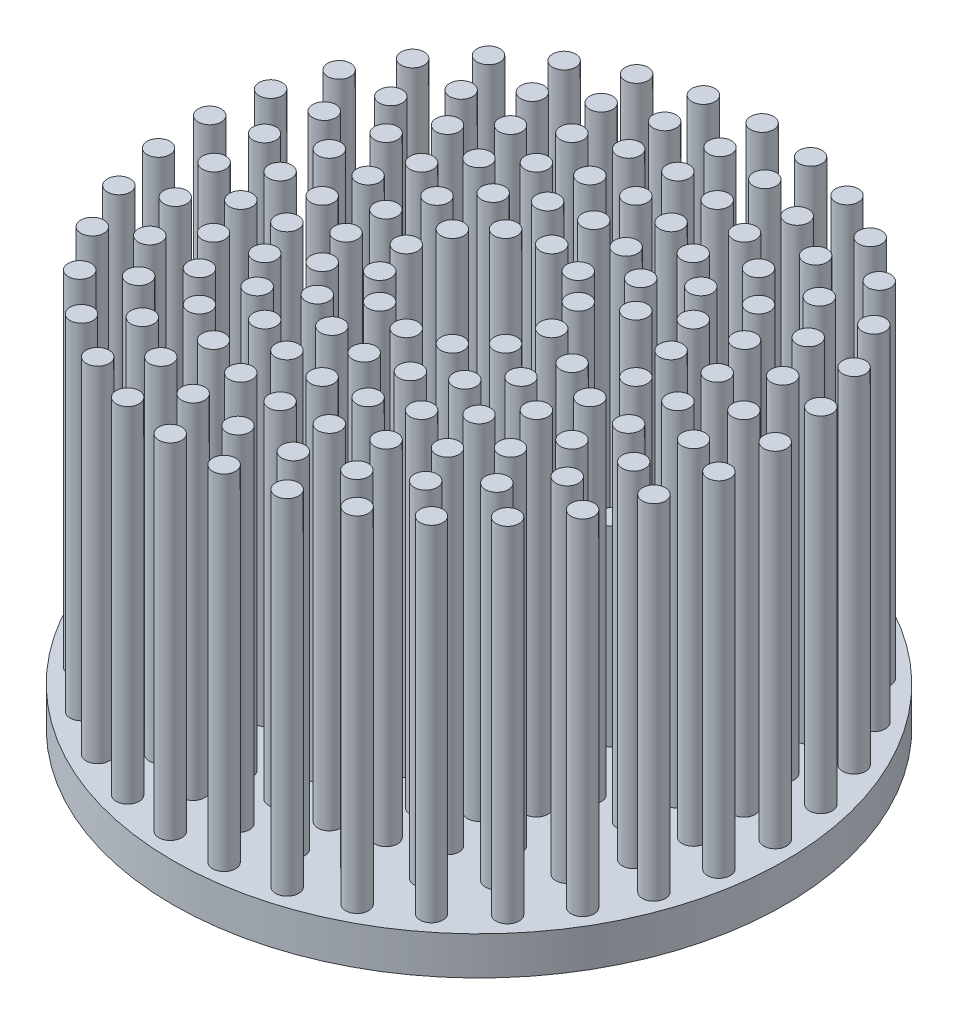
SolidWorks part; units mm, degrees
ref_plane "前基準面" through (0, 0, 0) normal (0, 0, 1) x (1, 0, 0)
ref_plane "上基準面" through (0, 0, 0) normal (0, 1, 0) x (1, 0, 0)
ref_plane "右基準面" through (0, 0, 0) normal (1, 0, 0) x (0, 0, -1)
sketch "草圖1" plane through (0, 0, 0) normal (0, 1, 0) x (1, 0, 0)
  circle A0 centre (0, 0) radius 40
  dimension "D1" = 80
extrude "填料-伸長1" add sketch "草圖1" along normal blind 3
sketch "草圖2" plane through (0, 3, 0) normal (0, 1, 0) x (1, 0, 0)
  line L0 (0, 0) -> (0, 50000) construction
  circle A68 centre (0, 0) radius 1.5
  dimension "D1" = 3
  dimension "D3" = 4
  dimension "D2" = 5
extrude "填料-伸長2" add sketch "草圖2" along normal blind 27
sketch "草圖6" plane through (0, 3, 0) normal (0, 1, 0) x (1, 0, 0)
  circle A0 centre (0, 5.5) radius 1.5
  circle A2 centre (0, 0) radius 1.5 construction
  circle A3 centre (0, 0) radius 1.5 construction
  dimension "D1" = 2.5
extrude "填料-伸長4" add sketch "草圖6" along normal up to surface (27 mm away)
pattern_circular "環狀複製排列3" count 6 over 360 about axis through (0, 0, 0) along (0, 1, 0) of "填料-伸長4"
sketch "草圖7" plane through (0, 3, 0) normal (0, 1, 0) x (1, 0, 0)
  circle A0 centre (0, 9.5) radius 1.5
  circle A1 centre (0, 5.5) radius 1.5 construction
  dimension "D1" = 1
extrude "填料-伸長5" add sketch "草圖7" along normal up to surface (27 mm away)
pattern_circular "環狀複製排列4" count 12 over 360 about axis through (0, 0, 0) along (0, 1, 0) of "填料-伸長5"
sketch "草圖8" plane through (0, 3, 0) normal (0, 1, 0) x (1, 0, 0)
  circle A0 centre (0, 15) radius 1.5
  circle A1 centre (0, 9.5) radius 1.5 construction
  circle A2 centre (0, 9.5) radius 1.5 construction
  dimension "D1" = 2.5
extrude "填料-伸長6" add sketch "草圖8" along normal up to surface (27 mm away)
pattern_circular "環狀複製排列5" count 18 over 360 about axis through (0, 0, 0) along (0, 1, 0) of "填料-伸長6"
sketch "草圖10" plane through (0, 3, 0) normal (0, 1, 0) x (1, 0, 0)
  circle A0 centre (0, 20.5) radius 1.5
  circle A1 centre (0, 15) radius 1.5 construction
  dimension "D1" = 2.5
extrude "填料-伸長7" add sketch "草圖10" along normal up to surface (27 mm away)
pattern_circular "環狀複製排列6" count 24 over 360 about axis through (0, 0, 0) along (0, 1, 0) of "填料-伸長7"
sketch "草圖11" plane through (0, 3, 0) normal (0, 1, 0) x (1, 0, 0)
  circle A0 centre (0, 26) radius 1.5
  circle A1 centre (0, 20.5) radius 1.5 construction
  dimension "D1" = 2.5
extrude "填料-伸長8" add sketch "草圖11" along normal up to surface (27 mm away)
pattern_circular "環狀複製排列7" count 28 over 360 about axis through (0, 0, 0) along (0, 1, 0) of "填料-伸長8"
sketch "草圖13" plane through (0, 3, 0) normal (0, 1, 0) x (1, 0, 0)
  circle A0 centre (0, 0) radius 7
  circle A1 centre (4.7631, -2.75) radius 1.5 construction
extrude "除料-伸長3" cut sketch "草圖13" along normal up to surface (27 mm away)
sketch "草圖15" plane through (0, 3, 0) normal (0, 1, 0) x (1, 0, 0)
  circle A0 centre (0, 0) radius 5.75 construction
  circle A1 centre (0, 4) radius 1.5
  circle A2 centre (0, 9.5) radius 1.5 construction
  circle A4 centre (0, 9.5) radius 1.5 construction
  dimension "D1" = 11.5
  dimension "D2" = 2.5
extrude "填料-伸長10" add sketch "草圖15" along normal up to surface (27 mm away)
pattern_circular "環狀複製排列8" count 5 over 360 about axis through (0, 0, 0) along (0, 1, 0) of "填料-伸長10"
sketch "草圖16" plane through (0, 3, 0) normal (0, 1, 0) x (1, 0, 0)
  circle A0 centre (-5.3058, 19.8015) radius 1.5 construction
  circle A1 centre (20.3276, 16.2107) radius 1.5
  circle A2 centre (20.3276, 16.2107) radius 1.5
  circle A3 centre (11.281, -23.4252) radius 1.5
  circle A4 centre (11.281, -23.4252) radius 1.5
  circle A5 centre (0, -20.5) radius 1.5
  circle A6 centre (0, -20.5) radius 1.5
  circle A7 centre (-5.7855, -25.3481) radius 1.5
  circle A8 centre (-5.7855, -25.3481) radius 1.5
  circle A9 centre (-10.25, -17.7535) radius 1.5
  circle A10 centre (-10.25, -17.7535) radius 1.5
  circle A11 centre (-25.3481, -5.7855) radius 1.5
  circle A12 centre (-25.3481, -5.7855) radius 1.5
  circle A13 centre (9.6418, 11.4907) radius 1.5
  circle A14 centre (9.6418, 11.4907) radius 1.5
  circle A15 centre (12.9904, 7.5) radius 1.5
  circle A16 centre (12.9904, 7.5) radius 1.5
  circle A17 centre (2.3511, -3.2361) radius 1.5
  circle A18 centre (2.3511, -3.2361) radius 1.5
  circle A19 centre (0, 4) radius 1.5
  circle A20 centre (0, 4) radius 1.5
  circle A21 centre (-12.9904, -7.5) radius 1.5
  circle A22 centre (-12.9904, -7.5) radius 1.5
  circle A23 centre (0, 26) radius 1.5 construction
  circle A24 centre (0, 20.5) radius 1.5 construction
  circle A25 centre (5.7855, 25.3481) radius 1.5 construction
  circle A26 centre (5.3058, 19.8015) radius 1.5 construction
  circle A27 centre (16.2107, 20.3276) radius 1.5 construction
  circle A28 centre (14.4957, 14.4957) radius 1.5 construction
  circle A29 centre (23.4252, 11.281) radius 1.5 construction
  circle A30 centre (25.3481, 5.7855) radius 1.5 construction
  circle A31 centre (19.8015, 5.3058) radius 1.5 construction
  circle A32 centre (20.5, 0) radius 1.5 construction
  circle A33 centre (26, 0) radius 1.5 construction
  circle A34 centre (25.3481, -5.7855) radius 1.5 construction
  circle A35 centre (19.8015, -5.3058) radius 1.5 construction
  circle A36 centre (23.4252, -11.281) radius 1.5 construction
  circle A37 centre (20.3276, -16.2107) radius 1.5 construction
  circle A38 centre (14.4957, -14.4957) radius 1.5 construction
  circle A39 centre (10.25, -17.7535) radius 1.5 construction
  circle A40 centre (5.3058, -19.8015) radius 1.5 construction
  circle A41 centre (-5.3058, -19.8015) radius 1.5 construction
  circle A42 centre (-14.4957, -14.4957) radius 1.5 construction
  circle A43 centre (-23.4252, -11.281) radius 1.5 construction
  circle A44 centre (-17.7535, -10.25) radius 1.5 construction
  circle A45 centre (-19.8015, -5.3058) radius 1.5 construction
  circle A46 centre (-26, 0) radius 1.5 construction
  circle A47 centre (-20.5, 0) radius 1.5 construction
  circle A48 centre (-19.8015, 5.3058) radius 1.5 construction
  circle A49 centre (-17.7535, 10.25) radius 1.5 construction
  circle A50 centre (-14.4957, 14.4957) radius 1.5 construction
  circle A51 centre (-20.3276, 16.2107) radius 1.5 construction
  circle A52 centre (-16.2107, 20.3276) radius 1.5 construction
  circle A53 centre (-11.281, 23.4252) radius 1.5 construction
  circle A54 centre (-5.1303, 14.0954) radius 1.5 construction
  circle A55 centre (0, 15) radius 1.5 construction
  circle A56 centre (5.1303, 14.0954) radius 1.5 construction
  circle A57 centre (14.7721, 2.6047) radius 1.5 construction
  circle A58 centre (9.6418, -11.4907) radius 1.5 construction
  circle A59 centre (0, -15) radius 1.5 construction
  circle A60 centre (5.1303, -14.0954) radius 1.5 construction
  circle A61 centre (4.75, -8.2272) radius 1.5 construction
  circle A62 centre (0, -9.5) radius 1.5 construction
  circle A63 centre (-2.3511, -3.2361) radius 1.5 construction
  circle A64 centre (0, 9.5) radius 1.5 construction
  circle A65 centre (-4.75, 8.2272) radius 1.5 construction
  circle A66 centre (-9.6418, 11.4907) radius 1.5 construction
  circle A67 centre (-12.9904, 7.5) radius 1.5 construction
  circle A68 centre (-8.2272, 4.75) radius 1.5 construction
  circle A69 centre (-9.5, 0) radius 1.5 construction
  circle A70 centre (-14.7721, -2.6047) radius 1.5 construction
  circle A71 centre (-14.7721, 2.6047) radius 1.5 construction
  circle A72 centre (-8.2272, -4.75) radius 1.5 construction
  circle A73 centre (-4.75, -8.2272) radius 1.5 construction
  circle A74 centre (-5.1303, -14.0954) radius 1.5 construction
  circle A75 centre (4.75, 8.2272) radius 1.5 construction
  circle A76 centre (8.2272, 4.75) radius 1.5 construction
  circle A77 centre (9.5, 0) radius 1.5 construction
  circle A78 centre (8.2272, -4.75) radius 1.5 construction
  circle A79 centre (-5.7855, 25.3481) radius 1.5 construction
  circle A80 centre (11.281, 23.4252) radius 1.5 construction
  circle A81 centre (10.25, 17.7535) radius 1.5 construction
  circle A82 centre (17.7535, 10.25) radius 1.5 construction
  circle A83 centre (17.7535, -10.25) radius 1.5 construction
  circle A84 centre (16.2107, -20.3276) radius 1.5 construction
  circle A85 centre (5.7855, -25.3481) radius 1.5 construction
  circle A86 centre (0, -26) radius 1.5 construction
  circle A87 centre (-11.281, -23.4252) radius 1.5 construction
  circle A88 centre (-16.2107, -20.3276) radius 1.5 construction
  circle A89 centre (-20.3276, -16.2107) radius 1.5 construction
  circle A90 centre (-25.3481, 5.7855) radius 1.5 construction
  circle A91 centre (-23.4252, 11.281) radius 1.5 construction
  circle A92 centre (-10.25, 17.7535) radius 1.5 construction
  circle A93 centre (14.7721, -2.6047) radius 1.5 construction
  circle A94 centre (12.9904, -7.5) radius 1.5 construction
  circle A95 centre (3.8042, 1.2361) radius 1.5 construction
  circle A96 centre (-9.6418, -11.4907) radius 1.5 construction
  circle A97 centre (-3.8042, 1.2361) radius 1.5 construction
  circle A98 centre (-5.3058, 19.8015) radius 1.5
  circle A99 centre (0, 26) radius 1.5
  circle A100 centre (0, 20.5) radius 1.5
  circle A101 centre (5.7855, 25.3481) radius 1.5
  circle A102 centre (5.3058, 19.8015) radius 1.5
  circle A103 centre (16.2107, 20.3276) radius 1.5
  circle A104 centre (14.4957, 14.4957) radius 1.5
  circle A105 centre (23.4252, 11.281) radius 1.5
  circle A106 centre (25.3481, 5.7855) radius 1.5
  circle A107 centre (19.8015, 5.3058) radius 1.5
  circle A108 centre (20.5, 0) radius 1.5
  circle A109 centre (26, 0) radius 1.5
  circle A110 centre (25.3481, -5.7855) radius 1.5
  circle A111 centre (19.8015, -5.3058) radius 1.5
  circle A112 centre (23.4252, -11.281) radius 1.5
  circle A113 centre (20.3276, -16.2107) radius 1.5
  circle A114 centre (14.4957, -14.4957) radius 1.5
  circle A115 centre (10.25, -17.7535) radius 1.5
  circle A116 centre (5.3058, -19.8015) radius 1.5
  circle A117 centre (-5.3058, -19.8015) radius 1.5
  circle A118 centre (-14.4957, -14.4957) radius 1.5
  circle A119 centre (-23.4252, -11.281) radius 1.5
  circle A120 centre (-17.7535, -10.25) radius 1.5
  circle A121 centre (-19.8015, -5.3058) radius 1.5
  circle A122 centre (-26, 0) radius 1.5
  circle A123 centre (-20.5, 0) radius 1.5
  circle A124 centre (-19.8015, 5.3058) radius 1.5
  circle A125 centre (-17.7535, 10.25) radius 1.5
  circle A126 centre (-14.4957, 14.4957) radius 1.5
  circle A127 centre (-20.3276, 16.2107) radius 1.5
  circle A128 centre (-16.2107, 20.3276) radius 1.5
  circle A129 centre (-11.281, 23.4252) radius 1.5
  circle A130 centre (-5.1303, 14.0954) radius 1.5
  circle A131 centre (0, 15) radius 1.5
  circle A132 centre (5.1303, 14.0954) radius 1.5
  circle A133 centre (14.7721, 2.6047) radius 1.5
  circle A134 centre (9.6418, -11.4907) radius 1.5
  circle A135 centre (0, -15) radius 1.5
  circle A136 centre (5.1303, -14.0954) radius 1.5
  circle A137 centre (4.75, -8.2272) radius 1.5
  circle A138 centre (0, -9.5) radius 1.5
  circle A139 centre (-2.3511, -3.2361) radius 1.5
  circle A140 centre (0, 9.5) radius 1.5
  circle A141 centre (-4.75, 8.2272) radius 1.5
  circle A142 centre (-9.6418, 11.4907) radius 1.5
  circle A143 centre (-12.9904, 7.5) radius 1.5
  circle A144 centre (-8.2272, 4.75) radius 1.5
  circle A145 centre (-9.5, 0) radius 1.5
  circle A146 centre (-14.7721, -2.6047) radius 1.5
  circle A147 centre (-14.7721, 2.6047) radius 1.5
  circle A148 centre (-8.2272, -4.75) radius 1.5
  circle A149 centre (-4.75, -8.2272) radius 1.5
  circle A150 centre (-5.1303, -14.0954) radius 1.5
  circle A151 centre (4.75, 8.2272) radius 1.5
  circle A152 centre (8.2272, 4.75) radius 1.5
  circle A153 centre (9.5, 0) radius 1.5
  circle A154 centre (8.2272, -4.75) radius 1.5
  circle A155 centre (-5.7855, 25.3481) radius 1.5
  circle A156 centre (11.281, 23.4252) radius 1.5
  circle A157 centre (10.25, 17.7535) radius 1.5
  circle A158 centre (17.7535, 10.25) radius 1.5
  circle A159 centre (17.7535, -10.25) radius 1.5
  circle A160 centre (16.2107, -20.3276) radius 1.5
  circle A161 centre (5.7855, -25.3481) radius 1.5
  circle A162 centre (0, -26) radius 1.5
  circle A163 centre (-11.281, -23.4252) radius 1.5
  circle A164 centre (-16.2107, -20.3276) radius 1.5
  circle A165 centre (-20.3276, -16.2107) radius 1.5
  circle A166 centre (-25.3481, 5.7855) radius 1.5
  circle A167 centre (-23.4252, 11.281) radius 1.5
  circle A168 centre (-10.25, 17.7535) radius 1.5
  circle A169 centre (14.7721, -2.6047) radius 1.5
  circle A170 centre (12.9904, -7.5) radius 1.5
  circle A171 centre (3.8042, 1.2361) radius 1.5
  circle A172 centre (-9.6418, -11.4907) radius 1.5
  circle A173 centre (-3.8042, 1.2361) radius 1.5
  dimension "D1" = 0
  dimension "D2" = 0
  dimension "D3" = 0
  dimension "D4" = 0
  dimension "D5" = 0
  dimension "D6" = 0
  dimension "D7" = 0
  dimension "D8" = 0
  dimension "D9" = 0
  dimension "D10" = 0
  dimension "D11" = 0
sketch "草圖23" plane through (0, 3, 0) normal (0, 1, 0) x (1, 0, 0)
  circle A0 centre (0, 31.5) radius 1.5
  circle A1 centre (0, 26) radius 1.5 construction
  dimension "D1" = 5.5
extrude "填料-伸長16" add sketch "草圖23" along normal up to surface (27 mm away)
pattern_circular "環狀複製排列9" count 30 over 360 about axis through (0, 0, 0) along (0, 1, 0) of "填料-伸長16"
sketch "草圖26" plane through (0, 3, 0) normal (0, 1, 0) x (1, 0, 0)
  circle A0 centre (0, 37) radius 1.5
  circle A1 centre (0, 31.5) radius 1.5 construction
  circle A2 centre (0, 31.5) radius 1.5 construction
  dimension "D1" = 5.5
extrude "填料-伸長17" add sketch "草圖26" along normal up to surface (27 mm away)
pattern_circular "環狀複製排列10" count 33 over 360 about axis through (0, 0, 0) along (0, 1, 0) of "填料-伸長17"
sketch "草圖25" plane through (0, 3, 0) normal (0, 1, 0) x (1, 0, 0)
  circle A0 centre (0, 31.5) radius 1.5 construction
  circle A1 centre (6.5492, 30.8116) radius 1.5 construction
  circle A2 centre (12.8122, 28.7767) radius 1.5 construction
  circle A3 centre (11.281, 23.4252) radius 1.5 construction
  circle A4 centre (18.5152, 25.484) radius 1.5 construction
  circle A5 centre (23.4091, 21.0776) radius 1.5 construction
  circle A6 centre (27.2798, 15.75) radius 1.5 construction
  circle A7 centre (25.3481, 5.7855) radius 1.5 construction
  circle A8 centre (17.7535, 10.25) radius 1.5 construction
  circle A9 centre (0, 15) radius 1.5 construction
  circle A10 centre (0, 20.5) radius 1.5 construction
  circle A11 centre (-5.3058, 19.8015) radius 1.5 construction
  circle A12 centre (-5.7855, 25.3481) radius 1.5 construction
  circle A13 centre (-11.281, 23.4252) radius 1.5 construction
  circle A14 centre (-16.2107, 20.3276) radius 1.5 construction
  circle A15 centre (-23.4091, 21.0776) radius 1.5 construction
  circle A16 centre (-20.3276, 16.2107) radius 1.5 construction
  circle A17 centre (-27.2798, 15.75) radius 1.5 construction
  circle A18 centre (-25.3481, 5.7855) radius 1.5 construction
  circle A19 centre (-29.9583, 9.734) radius 1.5 construction
  circle A20 centre (-31.3274, 3.2926) radius 1.5 construction
  circle A21 centre (-31.3274, -3.2926) radius 1.5 construction
  circle A22 centre (-25.3481, -5.7855) radius 1.5 construction
  circle A23 centre (-27.2798, -15.75) radius 1.5 construction
  circle A24 centre (-20.3276, -16.2107) radius 1.5 construction
  circle A25 centre (-11.281, -23.4252) radius 1.5 construction
  circle A26 centre (-5.7855, -25.3481) radius 1.5 construction
  circle A27 centre (0, -26) radius 1.5 construction
  circle A28 centre (11.281, -23.4252) radius 1.5 construction
  circle A29 centre (18.5152, -25.484) radius 1.5 construction
  circle A30 centre (16.2107, -20.3276) radius 1.5 construction
  circle A31 centre (23.4091, -21.0776) radius 1.5 construction
  circle A32 centre (20.3276, -16.2107) radius 1.5 construction
  circle A33 centre (27.2798, -15.75) radius 1.5 construction
  circle A34 centre (29.9583, -9.734) radius 1.5 construction
  circle A35 centre (31.3274, 3.2926) radius 1.5 construction
  circle A36 centre (31.3274, -3.2926) radius 1.5 construction
  circle A37 centre (26, 0) radius 1.5 construction
  circle A38 centre (19.8015, -5.3058) radius 1.5 construction
  circle A39 centre (3.8042, 1.2361) radius 1.5 construction
  circle A40 centre (8.2272, 4.75) radius 1.5 construction
  circle A41 centre (14.7721, 2.6047) radius 1.5 construction
  circle A42 centre (12.9904, 7.5) radius 1.5 construction
  circle A43 centre (9.6418, 11.4907) radius 1.5 construction
  circle A44 centre (-4.75, 8.2272) radius 1.5 construction
  circle A45 centre (-10.25, 17.7535) radius 1.5 construction
  circle A46 centre (-14.4957, 14.4957) radius 1.5 construction
  circle A47 centre (-9.6418, 11.4907) radius 1.5 construction
  circle A48 centre (-12.9904, 7.5) radius 1.5 construction
  circle A49 centre (-17.7535, 10.25) radius 1.5 construction
  circle A50 centre (-19.8015, 5.3058) radius 1.5 construction
  circle A51 centre (-19.8015, -5.3058) radius 1.5 construction
  circle A52 centre (-14.7721, -2.6047) radius 1.5 construction
  circle A53 centre (-17.7535, -10.25) radius 1.5 construction
  circle A54 centre (-10.25, -17.7535) radius 1.5 construction
  circle A55 centre (-5.1303, -14.0954) radius 1.5 construction
  circle A56 centre (-4.75, -8.2272) radius 1.5 construction
  circle A57 centre (-8.2272, -4.75) radius 1.5 construction
  circle A58 centre (-9.5, 0) radius 1.5 construction
  circle A59 centre (-8.2272, 4.75) radius 1.5 construction
  circle A60 centre (0, 4) radius 1.5 construction
  circle A61 centre (2.3511, -3.2361) radius 1.5 construction
  circle A62 centre (8.2272, -4.75) radius 1.5 construction
  circle A63 centre (0, -9.5) radius 1.5 construction
  circle A64 centre (5.1303, -14.0954) radius 1.5 construction
  circle A65 centre (9.6418, -11.4907) radius 1.5 construction
  circle A66 centre (12.9904, -7.5) radius 1.5 construction
  circle A67 centre (-5.3058, -19.8015) radius 1.5 construction
  circle A68 centre (-6.5492, 30.8116) radius 1.5 construction
  circle A69 centre (0, 26) radius 1.5 construction
  circle A70 centre (5.7855, 25.3481) radius 1.5 construction
  circle A71 centre (16.2107, 20.3276) radius 1.5 construction
  circle A72 centre (20.3276, 16.2107) radius 1.5 construction
  circle A73 centre (23.4252, 11.281) radius 1.5 construction
  circle A74 centre (29.9583, 9.734) radius 1.5 construction
  circle A75 centre (19.8015, 5.3058) radius 1.5 construction
  circle A76 centre (14.4957, 14.4957) radius 1.5 construction
  circle A77 centre (10.25, 17.7535) radius 1.5 construction
  circle A78 centre (5.3058, 19.8015) radius 1.5 construction
  circle A79 centre (5.1303, 14.0954) radius 1.5 construction
  circle A80 centre (-12.8122, 28.7767) radius 1.5 construction
  circle A81 centre (-18.5152, 25.484) radius 1.5 construction
  circle A82 centre (-23.4252, 11.281) radius 1.5 construction
  circle A83 centre (-26, 0) radius 1.5 construction
  circle A84 centre (-29.9583, -9.734) radius 1.5 construction
  circle A85 centre (-23.4252, -11.281) radius 1.5 construction
  circle A86 centre (-23.4091, -21.0776) radius 1.5 construction
  circle A87 centre (-16.2107, -20.3276) radius 1.5 construction
  circle A88 centre (-18.5152, -25.484) radius 1.5 construction
  circle A89 centre (-12.8122, -28.7767) radius 1.5 construction
  circle A90 centre (-6.5492, -30.8116) radius 1.5 construction
  circle A91 centre (0, -31.5) radius 1.5 construction
  circle A92 centre (5.7855, -25.3481) radius 1.5 construction
  circle A93 centre (6.5492, -30.8116) radius 1.5 construction
  circle A94 centre (12.8122, -28.7767) radius 1.5 construction
  circle A95 centre (23.4252, -11.281) radius 1.5 construction
  circle A96 centre (25.3481, -5.7855) radius 1.5 construction
  circle A97 centre (20.5, 0) radius 1.5 construction
  circle A98 centre (14.7721, -2.6047) radius 1.5 construction
  circle A99 centre (9.5, 0) radius 1.5 construction
  circle A100 centre (4.75, 8.2272) radius 1.5 construction
  circle A101 centre (0, 9.5) radius 1.5 construction
  circle A102 centre (-5.1303, 14.0954) radius 1.5 construction
  circle A103 centre (-14.7721, 2.6047) radius 1.5 construction
  circle A104 centre (-20.5, 0) radius 1.5 construction
  circle A105 centre (-12.9904, -7.5) radius 1.5 construction
  circle A106 centre (-9.6418, -11.4907) radius 1.5 construction
  circle A107 centre (-14.4957, -14.4957) radius 1.5 construction
  circle A108 centre (-3.8042, 1.2361) radius 1.5 construction
  circle A109 centre (-2.3511, -3.2361) radius 1.5 construction
  circle A110 centre (4.75, -8.2272) radius 1.5 construction
  circle A111 centre (0, -15) radius 1.5 construction
  circle A112 centre (17.7535, -10.25) radius 1.5 construction
  circle A113 centre (14.4957, -14.4957) radius 1.5 construction
  circle A114 centre (10.25, -17.7535) radius 1.5 construction
  circle A115 centre (5.3058, -19.8015) radius 1.5 construction
  circle A116 centre (0, -20.5) radius 1.5 construction
  circle A117 centre (0, 31.5) radius 1.5
  circle A118 centre (6.5492, 30.8116) radius 1.5
  circle A119 centre (12.8122, 28.7767) radius 1.5
  circle A120 centre (11.281, 23.4252) radius 1.5
  circle A121 centre (18.5152, 25.484) radius 1.5
  circle A122 centre (23.4091, 21.0776) radius 1.5
  circle A123 centre (27.2798, 15.75) radius 1.5
  circle A124 centre (25.3481, 5.7855) radius 1.5
  circle A125 centre (17.7535, 10.25) radius 1.5
  circle A126 centre (0, 15) radius 1.5
  circle A127 centre (0, 20.5) radius 1.5
  circle A128 centre (-5.3058, 19.8015) radius 1.5
  circle A129 centre (-5.7855, 25.3481) radius 1.5
  circle A130 centre (-11.281, 23.4252) radius 1.5
  circle A131 centre (-16.2107, 20.3276) radius 1.5
  circle A132 centre (-23.4091, 21.0776) radius 1.5
  circle A133 centre (-20.3276, 16.2107) radius 1.5
  circle A134 centre (-27.2798, 15.75) radius 1.5
  circle A135 centre (-25.3481, 5.7855) radius 1.5
  circle A136 centre (-29.9583, 9.734) radius 1.5
  circle A137 centre (-31.3274, 3.2926) radius 1.5
  circle A138 centre (-31.3274, -3.2926) radius 1.5
  circle A139 centre (-25.3481, -5.7855) radius 1.5
  circle A140 centre (-27.2798, -15.75) radius 1.5
  circle A141 centre (-20.3276, -16.2107) radius 1.5
  circle A142 centre (-11.281, -23.4252) radius 1.5
  circle A143 centre (-5.7855, -25.3481) radius 1.5
  circle A144 centre (0, -26) radius 1.5
  circle A145 centre (11.281, -23.4252) radius 1.5
  circle A146 centre (18.5152, -25.484) radius 1.5
  circle A147 centre (16.2107, -20.3276) radius 1.5
  circle A148 centre (23.4091, -21.0776) radius 1.5
  circle A149 centre (20.3276, -16.2107) radius 1.5
  circle A150 centre (27.2798, -15.75) radius 1.5
  circle A151 centre (29.9583, -9.734) radius 1.5
  circle A152 centre (31.3274, 3.2926) radius 1.5
  circle A153 centre (31.3274, -3.2926) radius 1.5
  circle A154 centre (26, 0) radius 1.5
  circle A155 centre (19.8015, -5.3058) radius 1.5
  circle A156 centre (3.8042, 1.2361) radius 1.5
  circle A157 centre (8.2272, 4.75) radius 1.5
  circle A158 centre (14.7721, 2.6047) radius 1.5
  circle A159 centre (12.9904, 7.5) radius 1.5
  circle A160 centre (9.6418, 11.4907) radius 1.5
  circle A161 centre (-4.75, 8.2272) radius 1.5
  circle A162 centre (-10.25, 17.7535) radius 1.5
  circle A163 centre (-14.4957, 14.4957) radius 1.5
  circle A164 centre (-9.6418, 11.4907) radius 1.5
  circle A165 centre (-12.9904, 7.5) radius 1.5
  circle A166 centre (-17.7535, 10.25) radius 1.5
  circle A167 centre (-19.8015, 5.3058) radius 1.5
  circle A168 centre (-19.8015, -5.3058) radius 1.5
  circle A169 centre (-14.7721, -2.6047) radius 1.5
  circle A170 centre (-17.7535, -10.25) radius 1.5
  circle A171 centre (-10.25, -17.7535) radius 1.5
  circle A172 centre (-5.1303, -14.0954) radius 1.5
  circle A173 centre (-4.75, -8.2272) radius 1.5
  circle A174 centre (-8.2272, -4.75) radius 1.5
  circle A175 centre (-9.5, 0) radius 1.5
  circle A176 centre (-8.2272, 4.75) radius 1.5
  circle A177 centre (0, 4) radius 1.5
  circle A178 centre (2.3511, -3.2361) radius 1.5
  circle A179 centre (8.2272, -4.75) radius 1.5
  circle A180 centre (0, -9.5) radius 1.5
  circle A181 centre (5.1303, -14.0954) radius 1.5
  circle A182 centre (9.6418, -11.4907) radius 1.5
  circle A183 centre (12.9904, -7.5) radius 1.5
  circle A184 centre (-5.3058, -19.8015) radius 1.5
  circle A185 centre (-6.5492, 30.8116) radius 1.5
  circle A186 centre (0, 26) radius 1.5
  circle A187 centre (5.7855, 25.3481) radius 1.5
  circle A188 centre (16.2107, 20.3276) radius 1.5
  circle A189 centre (20.3276, 16.2107) radius 1.5
  circle A190 centre (23.4252, 11.281) radius 1.5
  circle A191 centre (29.9583, 9.734) radius 1.5
  circle A192 centre (19.8015, 5.3058) radius 1.5
  circle A193 centre (14.4957, 14.4957) radius 1.5
  circle A194 centre (10.25, 17.7535) radius 1.5
  circle A195 centre (5.3058, 19.8015) radius 1.5
  circle A196 centre (5.1303, 14.0954) radius 1.5
  circle A197 centre (-12.8122, 28.7767) radius 1.5
  circle A198 centre (-18.5152, 25.484) radius 1.5
  circle A199 centre (-23.4252, 11.281) radius 1.5
  circle A200 centre (-26, 0) radius 1.5
  circle A201 centre (-29.9583, -9.734) radius 1.5
  circle A202 centre (-23.4252, -11.281) radius 1.5
  circle A203 centre (-23.4091, -21.0776) radius 1.5
  circle A204 centre (-16.2107, -20.3276) radius 1.5
  circle A205 centre (-18.5152, -25.484) radius 1.5
  circle A206 centre (-12.8122, -28.7767) radius 1.5
  circle A207 centre (-6.5492, -30.8116) radius 1.5
  circle A208 centre (0, -31.5) radius 1.5
  circle A209 centre (5.7855, -25.3481) radius 1.5
  circle A210 centre (6.5492, -30.8116) radius 1.5
  circle A211 centre (12.8122, -28.7767) radius 1.5
  circle A212 centre (23.4252, -11.281) radius 1.5
  circle A213 centre (25.3481, -5.7855) radius 1.5
  circle A214 centre (20.5, 0) radius 1.5
  circle A215 centre (14.7721, -2.6047) radius 1.5
  circle A216 centre (9.5, 0) radius 1.5
  circle A217 centre (4.75, 8.2272) radius 1.5
  circle A218 centre (0, 9.5) radius 1.5
  circle A219 centre (-5.1303, 14.0954) radius 1.5
  circle A220 centre (-14.7721, 2.6047) radius 1.5
  circle A221 centre (-20.5, 0) radius 1.5
  circle A222 centre (-12.9904, -7.5) radius 1.5
  circle A223 centre (-9.6418, -11.4907) radius 1.5
  circle A224 centre (-14.4957, -14.4957) radius 1.5
  circle A225 centre (-3.8042, 1.2361) radius 1.5
  circle A226 centre (-2.3511, -3.2361) radius 1.5
  circle A227 centre (4.75, -8.2272) radius 1.5
  circle A228 centre (0, -15) radius 1.5
  circle A229 centre (17.7535, -10.25) radius 1.5
  circle A230 centre (14.4957, -14.4957) radius 1.5
  circle A231 centre (10.25, -17.7535) radius 1.5
  circle A232 centre (5.3058, -19.8015) radius 1.5
  circle A233 centre (0, -20.5) radius 1.5
  circle A234 centre (-20.0037, 31.1264) radius 1.5 construction
  circle A235 centre (0, 37) radius 1.5 construction
  circle A236 centre (7.0023, 36.3314) radius 1.5 construction
  circle A237 centre (13.7515, 34.3496) radius 1.5 construction
  circle A238 centre (20.0037, 31.1264) radius 1.5 construction
  circle A239 centre (36.6234, -5.2656) radius 1.5 construction
  circle A240 centre (22.8719, -29.084) radius 1.5 construction
  circle A241 centre (-3.5171, -36.8325) radius 1.5 construction
  circle A242 centre (-10.4241, -35.5012) radius 1.5 construction
  circle A243 centre (-22.8719, -29.084) radius 1.5 construction
  circle A244 centre (-36.9581, 1.7605) radius 1.5 construction
  circle A245 centre (-35.957, 8.7231) radius 1.5 construction
  circle A246 centre (-33.6564, 15.3704) radius 1.5 construction
  circle A247 centre (-30.1393, 21.4621) radius 1.5 construction
  circle A248 centre (-25.5329, 26.7782) radius 1.5 construction
  circle A249 centre (-13.7515, 34.3496) radius 1.5 construction
  circle A250 centre (-7.0023, 36.3314) radius 1.5 construction
  circle A251 centre (25.5329, 26.7782) radius 1.5 construction
  circle A252 centre (30.1393, 21.4621) radius 1.5 construction
  circle A253 centre (33.6564, 15.3704) radius 1.5 construction
  circle A254 centre (35.957, 8.7231) radius 1.5 construction
  circle A255 centre (36.9581, 1.7605) radius 1.5 construction
  circle A256 centre (34.965, -12.1015) radius 1.5 construction
  circle A257 centre (32.0429, -18.5) radius 1.5 construction
  circle A258 centre (27.9627, -24.2298) radius 1.5 construction
  circle A259 centre (16.9544, -32.8869) radius 1.5 construction
  circle A260 centre (10.4241, -35.5012) radius 1.5 construction
  circle A261 centre (3.5171, -36.8325) radius 1.5 construction
  circle A262 centre (-16.9544, -32.8869) radius 1.5 construction
  circle A263 centre (-27.9627, -24.2298) radius 1.5 construction
  circle A264 centre (-32.0429, -18.5) radius 1.5 construction
  circle A265 centre (-34.965, -12.1015) radius 1.5 construction
  circle A266 centre (-36.6234, -5.2656) radius 1.5 construction
  circle A267 centre (-20.0037, 31.1264) radius 1.5
  circle A268 centre (0, 37) radius 1.5
  circle A269 centre (7.0023, 36.3314) radius 1.5
  circle A270 centre (13.7515, 34.3496) radius 1.5
  circle A271 centre (20.0037, 31.1264) radius 1.5
  circle A272 centre (36.6234, -5.2656) radius 1.5
  circle A273 centre (22.8719, -29.084) radius 1.5
  circle A274 centre (-3.5171, -36.8325) radius 1.5
  circle A275 centre (-10.4241, -35.5012) radius 1.5
  circle A276 centre (-22.8719, -29.084) radius 1.5
  circle A277 centre (-36.9581, 1.7605) radius 1.5
  circle A278 centre (-35.957, 8.7231) radius 1.5
  circle A279 centre (-33.6564, 15.3704) radius 1.5
  circle A280 centre (-30.1393, 21.4621) radius 1.5
  circle A281 centre (-25.5329, 26.7782) radius 1.5
  circle A282 centre (-13.7515, 34.3496) radius 1.5
  circle A283 centre (-7.0023, 36.3314) radius 1.5
  circle A284 centre (25.5329, 26.7782) radius 1.5
  circle A285 centre (30.1393, 21.4621) radius 1.5
  circle A286 centre (33.6564, 15.3704) radius 1.5
  circle A287 centre (35.957, 8.7231) radius 1.5
  circle A288 centre (36.9581, 1.7605) radius 1.5
  circle A289 centre (34.965, -12.1015) radius 1.5
  circle A290 centre (32.0429, -18.5) radius 1.5
  circle A291 centre (27.9627, -24.2298) radius 1.5
  circle A292 centre (16.9544, -32.8869) radius 1.5
  circle A293 centre (10.4241, -35.5012) radius 1.5
  circle A294 centre (3.5171, -36.8325) radius 1.5
  circle A295 centre (-16.9544, -32.8869) radius 1.5
  circle A296 centre (-27.9627, -24.2298) radius 1.5
  circle A297 centre (-32.0429, -18.5) radius 1.5
  circle A298 centre (-34.965, -12.1015) radius 1.5
  circle A299 centre (-36.6234, -5.2656) radius 1.5
sketch "草圖28" [suppressed] plane through (0, 3, 0) normal (0, 1, 0) x (1, 0, 0)
  circle A1 centre (0, 0) radius 40
  circle A2 centre (0, 0) radius 40
  dimension "D1" = 0
extrude "填料-伸長18" [suppressed] add sketch "草圖28" along normal blind 2
sketch "草圖29" plane through (0, 3, 0) normal (0, 1, 0) x (1, 0, 0)
  circle A1 centre (-17.7535, -10.25) radius 1.5
  circle A2 centre (-17.7535, -10.25) radius 1.5
  circle A3 centre (-14.7721, -2.6047) radius 1.5
  circle A4 centre (-14.7721, -2.6047) radius 1.5
  circle A5 centre (-19.8015, -5.3058) radius 1.5
  circle A6 centre (-19.8015, -5.3058) radius 1.5
  circle A7 centre (-19.8015, 5.3058) radius 1.5
  circle A8 centre (-19.8015, 5.3058) radius 1.5
  circle A9 centre (-17.7535, 10.25) radius 1.5
  circle A10 centre (-17.7535, 10.25) radius 1.5
  circle A11 centre (-12.9904, 7.5) radius 1.5
  circle A12 centre (-12.9904, 7.5) radius 1.5
  circle A13 centre (-9.6418, 11.4907) radius 1.5
  circle A14 centre (-9.6418, 11.4907) radius 1.5
  circle A15 centre (-14.4957, 14.4957) radius 1.5
  circle A16 centre (-14.4957, 14.4957) radius 1.5
  circle A17 centre (-10.25, 17.7535) radius 1.5
  circle A18 centre (-10.25, 17.7535) radius 1.5
  circle A19 centre (-4.75, 8.2272) radius 1.5
  circle A20 centre (-4.75, 8.2272) radius 1.5
  circle A21 centre (9.6418, 11.4907) radius 1.5
  circle A22 centre (9.6418, 11.4907) radius 1.5
  circle A23 centre (12.9904, 7.5) radius 1.5
  circle A24 centre (12.9904, 7.5) radius 1.5
  circle A25 centre (14.7721, 2.6047) radius 1.5
  circle A26 centre (14.7721, 2.6047) radius 1.5
  circle A27 centre (8.2272, 4.75) radius 1.5
  circle A28 centre (8.2272, 4.75) radius 1.5
  circle A29 centre (3.8042, 1.2361) radius 1.5
  circle A30 centre (3.8042, 1.2361) radius 1.5
  circle A31 centre (19.8015, -5.3058) radius 1.5
  circle A32 centre (19.8015, -5.3058) radius 1.5
  circle A33 centre (0, 26) radius 1.5
  circle A34 centre (0, 26) radius 1.5
  circle A35 centre (-6.5492, 30.8116) radius 1.5
  circle A36 centre (-6.5492, 30.8116) radius 1.5
  circle A37 centre (-5.3058, -19.8015) radius 1.5
  circle A38 centre (-5.3058, -19.8015) radius 1.5
  circle A39 centre (12.9904, -7.5) radius 1.5
  circle A40 centre (12.9904, -7.5) radius 1.5
  circle A41 centre (9.6418, -11.4907) radius 1.5
  circle A42 centre (9.6418, -11.4907) radius 1.5
  circle A43 centre (5.1303, -14.0954) radius 1.5
  circle A44 centre (5.1303, -14.0954) radius 1.5
  circle A45 centre (0, -9.5) radius 1.5
  circle A46 centre (0, -9.5) radius 1.5
  circle A47 centre (8.2272, -4.75) radius 1.5
  circle A48 centre (8.2272, -4.75) radius 1.5
  circle A49 centre (2.3511, -3.2361) radius 1.5
  circle A50 centre (2.3511, -3.2361) radius 1.5
  circle A51 centre (0, 4) radius 1.5
  circle A52 centre (0, 4) radius 1.5
  circle A53 centre (-8.2272, 4.75) radius 1.5
  circle A54 centre (-8.2272, 4.75) radius 1.5
  circle A55 centre (-9.5, 0) radius 1.5
  circle A56 centre (-9.5, 0) radius 1.5
  circle A57 centre (-8.2272, -4.75) radius 1.5
  circle A58 centre (-8.2272, -4.75) radius 1.5
  circle A59 centre (-4.75, -8.2272) radius 1.5
  circle A60 centre (-4.75, -8.2272) radius 1.5
  circle A61 centre (-5.1303, -14.0954) radius 1.5
  circle A62 centre (-5.1303, -14.0954) radius 1.5
  circle A63 centre (-10.25, -17.7535) radius 1.5
  circle A64 centre (-10.25, -17.7535) radius 1.5
  circle A65 centre (-23.4252, -11.281) radius 1.5
  circle A66 centre (-23.4252, -11.281) radius 1.5
  circle A67 centre (-29.9583, -9.734) radius 1.5
  circle A68 centre (-29.9583, -9.734) radius 1.5
  circle A69 centre (-26, 0) radius 1.5
  circle A70 centre (-26, 0) radius 1.5
  circle A71 centre (-23.4252, 11.281) radius 1.5
  circle A72 centre (-23.4252, 11.281) radius 1.5
  circle A73 centre (-18.5152, 25.484) radius 1.5
  circle A74 centre (-18.5152, 25.484) radius 1.5
  circle A75 centre (-12.8122, 28.7767) radius 1.5
  circle A76 centre (-12.8122, 28.7767) radius 1.5
  circle A77 centre (5.1303, 14.0954) radius 1.5
  circle A78 centre (5.1303, 14.0954) radius 1.5
  circle A79 centre (5.3058, 19.8015) radius 1.5
  circle A80 centre (5.3058, 19.8015) radius 1.5
  circle A81 centre (10.25, 17.7535) radius 1.5
  circle A82 centre (10.25, 17.7535) radius 1.5
  circle A83 centre (14.4957, 14.4957) radius 1.5
  circle A84 centre (14.4957, 14.4957) radius 1.5
  circle A85 centre (19.8015, 5.3058) radius 1.5
  circle A86 centre (19.8015, 5.3058) radius 1.5
  circle A87 centre (29.9583, 9.734) radius 1.5
  circle A88 centre (29.9583, 9.734) radius 1.5
  circle A89 centre (23.4252, 11.281) radius 1.5
  circle A90 centre (23.4252, 11.281) radius 1.5
  circle A91 centre (20.3276, 16.2107) radius 1.5
  circle A92 centre (20.3276, 16.2107) radius 1.5
  circle A93 centre (16.2107, 20.3276) radius 1.5
  circle A94 centre (16.2107, 20.3276) radius 1.5
  circle A95 centre (5.7855, 25.3481) radius 1.5
  circle A96 centre (5.7855, 25.3481) radius 1.5
  circle A97 centre (0, 9.5) radius 1.5
  circle A98 centre (0, 9.5) radius 1.5
  circle A99 centre (4.75, 8.2272) radius 1.5
  circle A100 centre (4.75, 8.2272) radius 1.5
  circle A101 centre (9.5, 0) radius 1.5
  circle A102 centre (9.5, 0) radius 1.5
  circle A103 centre (14.7721, -2.6047) radius 1.5
  circle A104 centre (14.7721, -2.6047) radius 1.5
  circle A105 centre (20.5, 0) radius 1.5
  circle A106 centre (20.5, 0) radius 1.5
  circle A107 centre (25.3481, -5.7855) radius 1.5
  circle A108 centre (25.3481, -5.7855) radius 1.5
  circle A109 centre (23.4252, -11.281) radius 1.5
  circle A110 centre (23.4252, -11.281) radius 1.5
  circle A111 centre (12.8122, -28.7767) radius 1.5
  circle A112 centre (12.8122, -28.7767) radius 1.5
  circle A113 centre (6.5492, -30.8116) radius 1.5
  circle A114 centre (6.5492, -30.8116) radius 1.5
  circle A115 centre (5.7855, -25.3481) radius 1.5
  circle A116 centre (5.7855, -25.3481) radius 1.5
  circle A117 centre (0, -31.5) radius 1.5
  circle A118 centre (0, -31.5) radius 1.5
  circle A119 centre (-6.5492, -30.8116) radius 1.5
  circle A120 centre (-6.5492, -30.8116) radius 1.5
  circle A121 centre (-12.8122, -28.7767) radius 1.5
  circle A122 centre (-12.8122, -28.7767) radius 1.5
  circle A123 centre (-18.5152, -25.484) radius 1.5
  circle A124 centre (-18.5152, -25.484) radius 1.5
  circle A125 centre (-16.2107, -20.3276) radius 1.5
  circle A126 centre (-16.2107, -20.3276) radius 1.5
  circle A127 centre (-23.4091, -21.0776) radius 1.5
  circle A128 centre (-23.4091, -21.0776) radius 1.5
  circle A129 centre (0, -20.5) radius 1.5
  circle A130 centre (0, -20.5) radius 1.5
  circle A131 centre (5.3058, -19.8015) radius 1.5
  circle A132 centre (5.3058, -19.8015) radius 1.5
  circle A133 centre (10.25, -17.7535) radius 1.5
  circle A134 centre (10.25, -17.7535) radius 1.5
  circle A135 centre (14.4957, -14.4957) radius 1.5
  circle A136 centre (14.4957, -14.4957) radius 1.5
  circle A137 centre (17.7535, -10.25) radius 1.5
  circle A138 centre (17.7535, -10.25) radius 1.5
  circle A139 centre (0, -15) radius 1.5
  circle A140 centre (0, -15) radius 1.5
  circle A141 centre (4.75, -8.2272) radius 1.5
  circle A142 centre (4.75, -8.2272) radius 1.5
  circle A143 centre (-2.3511, -3.2361) radius 1.5
  circle A144 centre (-2.3511, -3.2361) radius 1.5
  circle A145 centre (-3.8042, 1.2361) radius 1.5
  circle A146 centre (-3.8042, 1.2361) radius 1.5
  circle A147 centre (-14.4957, -14.4957) radius 1.5
  circle A148 centre (-14.4957, -14.4957) radius 1.5
  circle A149 centre (-9.6418, -11.4907) radius 1.5
  circle A150 centre (-9.6418, -11.4907) radius 1.5
  circle A151 centre (-12.9904, -7.5) radius 1.5
  circle A152 centre (-12.9904, -7.5) radius 1.5
  circle A153 centre (-20.5, 0) radius 1.5
  circle A154 centre (-20.5, 0) radius 1.5
  circle A155 centre (-14.7721, 2.6047) radius 1.5
  circle A156 centre (-14.7721, 2.6047) radius 1.5
  circle A157 centre (-5.1303, 14.0954) radius 1.5
  circle A158 centre (-5.1303, 14.0954) radius 1.5
  circle A159 centre (-25.5329, 26.7782) radius 1.5
  circle A160 centre (-25.5329, 26.7782) radius 1.5
  circle A161 centre (-30.1393, 21.4621) radius 1.5
  circle A162 centre (-30.1393, 21.4621) radius 1.5
  circle A163 centre (-33.6564, 15.3704) radius 1.5
  circle A164 centre (-33.6564, 15.3704) radius 1.5
  circle A165 centre (-35.957, 8.7231) radius 1.5
  circle A166 centre (-35.957, 8.7231) radius 1.5
  circle A167 centre (-36.9581, 1.7605) radius 1.5
  circle A168 centre (-36.9581, 1.7605) radius 1.5
  circle A169 centre (-22.8719, -29.084) radius 1.5
  circle A170 centre (-22.8719, -29.084) radius 1.5
  circle A171 centre (-10.4241, -35.5012) radius 1.5
  circle A172 centre (-10.4241, -35.5012) radius 1.5
  circle A173 centre (-3.5171, -36.8325) radius 1.5
  circle A174 centre (-3.5171, -36.8325) radius 1.5
  circle A175 centre (22.8719, -29.084) radius 1.5
  circle A176 centre (22.8719, -29.084) radius 1.5
  circle A177 centre (36.6234, -5.2656) radius 1.5
  circle A178 centre (36.6234, -5.2656) radius 1.5
  circle A179 centre (20.0037, 31.1264) radius 1.5
  circle A180 centre (20.0037, 31.1264) radius 1.5
  circle A181 centre (13.7515, 34.3496) radius 1.5
  circle A182 centre (13.7515, 34.3496) radius 1.5
  circle A183 centre (7.0023, 36.3314) radius 1.5
  circle A184 centre (7.0023, 36.3314) radius 1.5
  circle A185 centre (0, 37) radius 1.5
  circle A186 centre (0, 37) radius 1.5
  circle A187 centre (-20.0037, 31.1264) radius 1.5
  circle A188 centre (-20.0037, 31.1264) radius 1.5
  circle A189 centre (-32.0429, -18.5) radius 1.5
  circle A190 centre (-32.0429, -18.5) radius 1.5
  circle A191 centre (-27.9627, -24.2298) radius 1.5
  circle A192 centre (-27.9627, -24.2298) radius 1.5
  circle A193 centre (-16.9544, -32.8869) radius 1.5
  circle A194 centre (-16.9544, -32.8869) radius 1.5
  circle A195 centre (3.5171, -36.8325) radius 1.5
  circle A196 centre (3.5171, -36.8325) radius 1.5
  circle A197 centre (10.4241, -35.5012) radius 1.5
  circle A198 centre (10.4241, -35.5012) radius 1.5
  circle A199 centre (16.9544, -32.8869) radius 1.5
  circle A200 centre (16.9544, -32.8869) radius 1.5
  circle A201 centre (27.9627, -24.2298) radius 1.5
  circle A202 centre (27.9627, -24.2298) radius 1.5
  circle A203 centre (32.0429, -18.5) radius 1.5
  circle A204 centre (32.0429, -18.5) radius 1.5
  circle A205 centre (34.965, -12.1015) radius 1.5
  circle A206 centre (34.965, -12.1015) radius 1.5
  circle A207 centre (36.9581, 1.7605) radius 1.5
  circle A208 centre (36.9581, 1.7605) radius 1.5
  circle A209 centre (35.957, 8.7231) radius 1.5
  circle A210 centre (35.957, 8.7231) radius 1.5
  circle A211 centre (33.6564, 15.3704) radius 1.5
  circle A212 centre (33.6564, 15.3704) radius 1.5
  circle A213 centre (30.1393, 21.4621) radius 1.5
  circle A214 centre (30.1393, 21.4621) radius 1.5
  circle A215 centre (25.5329, 26.7782) radius 1.5
  circle A216 centre (25.5329, 26.7782) radius 1.5
  circle A217 centre (-7.0023, 36.3314) radius 1.5
  circle A218 centre (-7.0023, 36.3314) radius 1.5
  circle A219 centre (-13.7515, 34.3496) radius 1.5
  circle A220 centre (-13.7515, 34.3496) radius 1.5
  circle A221 centre (-36.6234, -5.2656) radius 1.5
  circle A222 centre (-36.6234, -5.2656) radius 1.5
  circle A223 centre (-34.965, -12.1015) radius 1.5
  circle A224 centre (-34.965, -12.1015) radius 1.5
  circle A225 centre (23.4091, 21.0776) radius 1.5
  circle A226 centre (23.4091, 21.0776) radius 1.5
  circle A227 centre (18.5152, 25.484) radius 1.5
  circle A228 centre (18.5152, 25.484) radius 1.5
  circle A229 centre (11.281, 23.4252) radius 1.5
  circle A230 centre (11.281, 23.4252) radius 1.5
  circle A231 centre (12.8122, 28.7767) radius 1.5
  circle A232 centre (12.8122, 28.7767) radius 1.5
  circle A233 centre (6.5492, 30.8116) radius 1.5
  circle A234 centre (6.5492, 30.8116) radius 1.5
  circle A235 centre (0, 31.5) radius 1.5
  circle A236 centre (0, 31.5) radius 1.5
  circle A237 centre (-31.3274, -3.2926) radius 1.5
  circle A238 centre (-31.3274, -3.2926) radius 1.5
  circle A239 centre (-31.3274, 3.2926) radius 1.5
  circle A240 centre (-31.3274, 3.2926) radius 1.5
  circle A241 centre (-29.9583, 9.734) radius 1.5
  circle A242 centre (-29.9583, 9.734) radius 1.5
  circle A243 centre (-25.3481, 5.7855) radius 1.5
  circle A244 centre (-25.3481, 5.7855) radius 1.5
  circle A245 centre (-27.2798, 15.75) radius 1.5
  circle A246 centre (-27.2798, 15.75) radius 1.5
  circle A247 centre (-20.3276, 16.2107) radius 1.5
  circle A248 centre (-20.3276, 16.2107) radius 1.5
  circle A249 centre (-23.4091, 21.0776) radius 1.5
  circle A250 centre (-23.4091, 21.0776) radius 1.5
  circle A251 centre (-16.2107, 20.3276) radius 1.5
  circle A252 centre (-16.2107, 20.3276) radius 1.5
  circle A253 centre (-11.281, 23.4252) radius 1.5
  circle A254 centre (-11.281, 23.4252) radius 1.5
  circle A255 centre (-5.7855, 25.3481) radius 1.5
  circle A256 centre (-5.7855, 25.3481) radius 1.5
  circle A257 centre (-5.3058, 19.8015) radius 1.5
  circle A258 centre (-5.3058, 19.8015) radius 1.5
  circle A259 centre (0, 20.5) radius 1.5
  circle A260 centre (0, 20.5) radius 1.5
  circle A261 centre (0, 15) radius 1.5
  circle A262 centre (0, 15) radius 1.5
  circle A263 centre (17.7535, 10.25) radius 1.5
  circle A264 centre (17.7535, 10.25) radius 1.5
  circle A265 centre (25.3481, 5.7855) radius 1.5
  circle A266 centre (25.3481, 5.7855) radius 1.5
  circle A267 centre (27.2798, 15.75) radius 1.5
  circle A268 centre (27.2798, 15.75) radius 1.5
  circle A269 centre (26, 0) radius 1.5
  circle A270 centre (26, 0) radius 1.5
  circle A271 centre (31.3274, -3.2926) radius 1.5
  circle A272 centre (31.3274, -3.2926) radius 1.5
  circle A273 centre (31.3274, 3.2926) radius 1.5
  circle A274 centre (31.3274, 3.2926) radius 1.5
  circle A275 centre (29.9583, -9.734) radius 1.5
  circle A276 centre (29.9583, -9.734) radius 1.5
  circle A277 centre (27.2798, -15.75) radius 1.5
  circle A278 centre (27.2798, -15.75) radius 1.5
  circle A279 centre (20.3276, -16.2107) radius 1.5
  circle A280 centre (20.3276, -16.2107) radius 1.5
  circle A281 centre (23.4091, -21.0776) radius 1.5
  circle A282 centre (23.4091, -21.0776) radius 1.5
  circle A283 centre (16.2107, -20.3276) radius 1.5
  circle A284 centre (16.2107, -20.3276) radius 1.5
  circle A285 centre (18.5152, -25.484) radius 1.5
  circle A286 centre (18.5152, -25.484) radius 1.5
  circle A287 centre (11.281, -23.4252) radius 1.5
  circle A288 centre (11.281, -23.4252) radius 1.5
  circle A289 centre (0, -26) radius 1.5
  circle A290 centre (0, -26) radius 1.5
  circle A291 centre (-5.7855, -25.3481) radius 1.5
  circle A292 centre (-5.7855, -25.3481) radius 1.5
  circle A293 centre (-11.281, -23.4252) radius 1.5
  circle A294 centre (-11.281, -23.4252) radius 1.5
  circle A295 centre (-20.3276, -16.2107) radius 1.5
  circle A296 centre (-20.3276, -16.2107) radius 1.5
  circle A297 centre (-27.2798, -15.75) radius 1.5
  circle A298 centre (-27.2798, -15.75) radius 1.5
  circle A299 centre (-25.3481, -5.7855) radius 1.5
  circle A300 centre (-25.3481, -5.7855) radius 1.5
  dimension "D1" = 0
  dimension "D2" = 0
  dimension "D3" = 0
  dimension "D4" = 0
  dimension "D5" = 0
  dimension "D6" = 0
  dimension "D7" = 0
  dimension "D8" = 0
  dimension "D9" = 0
  dimension "D10" = 0
  dimension "D11" = 0
  dimension "D12" = 0
  dimension "D13" = 0
  dimension "D14" = 0
  dimension "D15" = 0
  dimension "D16" = 0
  dimension "D17" = 0
  dimension "D18" = 0
  dimension "D19" = 0
  dimension "D20" = 0
  dimension "D21" = 0
  dimension "D22" = 0
  dimension "D23" = 0
  dimension "D24" = 0
  dimension "D25" = 0
  dimension "D26" = 0
  dimension "D27" = 0
  dimension "D28" = 0
  dimension "D29" = 0
  dimension "D30" = 0
  dimension "D31" = 0
  dimension "D32" = 0
  dimension "D33" = 0
  dimension "D34" = 0
  dimension "D35" = 0
  dimension "D36" = 0
  dimension "D37" = 0
  dimension "D38" = 0
  dimension "D39" = 0
  dimension "D40" = 0
  dimension "D41" = 0
  dimension "D42" = 0
  dimension "D43" = 0
  dimension "D44" = 0
  dimension "D45" = 0
  dimension "D46" = 0
  dimension "D47" = 0
  dimension "D48" = 0
  dimension "D49" = 0
  dimension "D50" = 0
  dimension "D51" = 0
  dimension "D52" = 0
  dimension "D53" = 0
  dimension "D54" = 0
  dimension "D55" = 0
  dimension "D56" = 0
  dimension "D57" = 0
  dimension "D58" = 0
  dimension "D59" = 0
  dimension "D60" = 0
  dimension "D61" = 0
  dimension "D62" = 0
  dimension "D63" = 0
  dimension "D64" = 0
  dimension "D65" = 0
  dimension "D66" = 0
  dimension "D67" = 0
  dimension "D68" = 0
  dimension "D69" = 0
  dimension "D70" = 0
  dimension "D71" = 0
  dimension "D72" = 0
  dimension "D73" = 0
  dimension "D74" = 0
  dimension "D75" = 0
  dimension "D76" = 0
  dimension "D77" = 0
  dimension "D78" = 0
  dimension "D79" = 0
  dimension "D80" = 0
  dimension "D81" = 0
  dimension "D82" = 0
  dimension "D83" = 0
  dimension "D84" = 0
  dimension "D85" = 0
  dimension "D86" = 0
  dimension "D87" = 0
  dimension "D88" = 0
  dimension "D89" = 0
  dimension "D90" = 0
  dimension "D91" = 0
  dimension "D92" = 0
  dimension "D93" = 0
  dimension "D94" = 0
  dimension "D95" = 0
  dimension "D96" = 0
  dimension "D97" = 0
  dimension "D98" = 0
  dimension "D99" = 0
  dimension "D100" = 0
  dimension "D101" = 0
  dimension "D102" = 0
  dimension "D103" = 0
  dimension "D104" = 0
  dimension "D105" = 0
  dimension "D106" = 0
  dimension "D107" = 0
  dimension "D108" = 0
  dimension "D109" = 0
  dimension "D110" = 0
  dimension "D111" = 0
  dimension "D112" = 0
  dimension "D113" = 0
  dimension "D114" = 0
  dimension "D115" = 0
  dimension "D116" = 0
  dimension "D117" = 0
  dimension "D118" = 0
  dimension "D119" = 0
  dimension "D120" = 0
  dimension "D121" = 0
  dimension "D122" = 0
  dimension "D123" = 0
  dimension "D124" = 0
  dimension "D125" = 0
  dimension "D126" = 0
  dimension "D127" = 0
  dimension "D128" = 0
  dimension "D129" = 0
  dimension "D130" = 0
  dimension "D131" = 0
  dimension "D132" = 0
  dimension "D133" = 0
  dimension "D134" = 0
  dimension "D135" = 0
  dimension "D136" = 0
  dimension "D137" = 0
  dimension "D138" = 0
  dimension "D139" = 0
  dimension "D140" = 0
  dimension "D141" = 0
  dimension "D142" = 0
  dimension "D143" = 0
  dimension "D144" = 0
  dimension "D145" = 0
  dimension "D146" = 0
  dimension "D147" = 0
  dimension "D148" = 0
  dimension "D149" = 0
  dimension "D150" = 0
extrude "填料-伸長19" add sketch "草圖29" along normal blind 37
sketch "草圖30" plane through (0, 3, 0) normal (0, 1, 0) x (1, 0, 0)
  circle A1 centre (0, 0) radius 40
  circle A2 centre (0, 0) radius 40
  dimension "D1" = 0
extrude "填料-伸長20" add sketch "草圖30" along normal blind 2
sketch "草圖31" [suppressed] plane through (0, 3, 0) normal (0, 1, 0) x (1, 0, 0)
  circle A1 centre (-17.7535, -10.25) radius 1.5
  circle A2 centre (-17.7535, -10.25) radius 1.5
  circle A3 centre (-14.7721, -2.6047) radius 1.5
  circle A4 centre (-14.7721, -2.6047) radius 1.5
  circle A5 centre (-19.8015, -5.3058) radius 1.5
  circle A6 centre (-19.8015, -5.3058) radius 1.5
  circle A7 centre (-19.8015, 5.3058) radius 1.5
  circle A8 centre (-19.8015, 5.3058) radius 1.5
  circle A9 centre (-17.7535, 10.25) radius 1.5
  circle A10 centre (-17.7535, 10.25) radius 1.5
  circle A11 centre (-12.9904, 7.5) radius 1.5
  circle A12 centre (-12.9904, 7.5) radius 1.5
  circle A13 centre (-9.6418, 11.4907) radius 1.5
  circle A14 centre (-9.6418, 11.4907) radius 1.5
  circle A15 centre (-14.4957, 14.4957) radius 1.5
  circle A16 centre (-14.4957, 14.4957) radius 1.5
  circle A17 centre (-10.25, 17.7535) radius 1.5
  circle A18 centre (-10.25, 17.7535) radius 1.5
  circle A19 centre (-4.75, 8.2272) radius 1.5
  circle A20 centre (-4.75, 8.2272) radius 1.5
  circle A21 centre (9.6418, 11.4907) radius 1.5
  circle A22 centre (9.6418, 11.4907) radius 1.5
  circle A23 centre (12.9904, 7.5) radius 1.5
  circle A24 centre (12.9904, 7.5) radius 1.5
  circle A25 centre (14.7721, 2.6047) radius 1.5
  circle A26 centre (14.7721, 2.6047) radius 1.5
  circle A27 centre (8.2272, 4.75) radius 1.5
  circle A28 centre (8.2272, 4.75) radius 1.5
  circle A29 centre (3.8042, 1.2361) radius 1.5
  circle A30 centre (3.8042, 1.2361) radius 1.5
  circle A31 centre (19.8015, -5.3058) radius 1.5
  circle A32 centre (19.8015, -5.3058) radius 1.5
  circle A33 centre (0, 26) radius 1.5
  circle A34 centre (0, 26) radius 1.5
  circle A35 centre (-6.5492, 30.8116) radius 1.5
  circle A36 centre (-6.5492, 30.8116) radius 1.5
  circle A37 centre (-5.3058, -19.8015) radius 1.5
  circle A38 centre (-5.3058, -19.8015) radius 1.5
  circle A39 centre (12.9904, -7.5) radius 1.5
  circle A40 centre (12.9904, -7.5) radius 1.5
  circle A41 centre (9.6418, -11.4907) radius 1.5
  circle A42 centre (9.6418, -11.4907) radius 1.5
  circle A43 centre (5.1303, -14.0954) radius 1.5
  circle A44 centre (5.1303, -14.0954) radius 1.5
  circle A45 centre (0, -9.5) radius 1.5
  circle A46 centre (0, -9.5) radius 1.5
  circle A47 centre (8.2272, -4.75) radius 1.5
  circle A48 centre (8.2272, -4.75) radius 1.5
  circle A49 centre (2.3511, -3.2361) radius 1.5
  circle A50 centre (2.3511, -3.2361) radius 1.5
  circle A51 centre (0, 4) radius 1.5
  circle A52 centre (0, 4) radius 1.5
  circle A53 centre (-8.2272, 4.75) radius 1.5
  circle A54 centre (-8.2272, 4.75) radius 1.5
  circle A55 centre (-9.5, 0) radius 1.5
  circle A56 centre (-9.5, 0) radius 1.5
  circle A57 centre (-8.2272, -4.75) radius 1.5
  circle A58 centre (-8.2272, -4.75) radius 1.5
  circle A59 centre (-4.75, -8.2272) radius 1.5
  circle A60 centre (-4.75, -8.2272) radius 1.5
  circle A61 centre (-5.1303, -14.0954) radius 1.5
  circle A62 centre (-5.1303, -14.0954) radius 1.5
  circle A63 centre (-10.25, -17.7535) radius 1.5
  circle A64 centre (-10.25, -17.7535) radius 1.5
  circle A65 centre (-23.4252, -11.281) radius 1.5
  circle A66 centre (-23.4252, -11.281) radius 1.5
  circle A67 centre (-29.9583, -9.734) radius 1.5
  circle A68 centre (-29.9583, -9.734) radius 1.5
  circle A69 centre (-26, 0) radius 1.5
  circle A70 centre (-26, 0) radius 1.5
  circle A71 centre (-23.4252, 11.281) radius 1.5
  circle A72 centre (-23.4252, 11.281) radius 1.5
  circle A73 centre (-18.5152, 25.484) radius 1.5
  circle A74 centre (-18.5152, 25.484) radius 1.5
  circle A75 centre (-12.8122, 28.7767) radius 1.5
  circle A76 centre (-12.8122, 28.7767) radius 1.5
  circle A77 centre (5.1303, 14.0954) radius 1.5
  circle A78 centre (5.1303, 14.0954) radius 1.5
  circle A79 centre (5.3058, 19.8015) radius 1.5
  circle A80 centre (5.3058, 19.8015) radius 1.5
  circle A81 centre (10.25, 17.7535) radius 1.5
  circle A82 centre (10.25, 17.7535) radius 1.5
  circle A83 centre (14.4957, 14.4957) radius 1.5
  circle A84 centre (14.4957, 14.4957) radius 1.5
  circle A85 centre (19.8015, 5.3058) radius 1.5
  circle A86 centre (19.8015, 5.3058) radius 1.5
  circle A87 centre (29.9583, 9.734) radius 1.5
  circle A88 centre (29.9583, 9.734) radius 1.5
  circle A89 centre (23.4252, 11.281) radius 1.5
  circle A90 centre (23.4252, 11.281) radius 1.5
  circle A91 centre (20.3276, 16.2107) radius 1.5
  circle A92 centre (20.3276, 16.2107) radius 1.5
  circle A93 centre (16.2107, 20.3276) radius 1.5
  circle A94 centre (16.2107, 20.3276) radius 1.5
  circle A95 centre (5.7855, 25.3481) radius 1.5
  circle A96 centre (5.7855, 25.3481) radius 1.5
  circle A97 centre (0, 9.5) radius 1.5
  circle A98 centre (0, 9.5) radius 1.5
  circle A99 centre (4.75, 8.2272) radius 1.5
  circle A100 centre (4.75, 8.2272) radius 1.5
  circle A101 centre (9.5, 0) radius 1.5
  circle A102 centre (9.5, 0) radius 1.5
  circle A103 centre (14.7721, -2.6047) radius 1.5
  circle A104 centre (14.7721, -2.6047) radius 1.5
  circle A105 centre (20.5, 0) radius 1.5
  circle A106 centre (20.5, 0) radius 1.5
  circle A107 centre (25.3481, -5.7855) radius 1.5
  circle A108 centre (25.3481, -5.7855) radius 1.5
  circle A109 centre (23.4252, -11.281) radius 1.5
  circle A110 centre (23.4252, -11.281) radius 1.5
  circle A111 centre (12.8122, -28.7767) radius 1.5
  circle A112 centre (12.8122, -28.7767) radius 1.5
  circle A113 centre (6.5492, -30.8116) radius 1.5
  circle A114 centre (6.5492, -30.8116) radius 1.5
  circle A115 centre (5.7855, -25.3481) radius 1.5
  circle A116 centre (5.7855, -25.3481) radius 1.5
  circle A117 centre (0, -31.5) radius 1.5
  circle A118 centre (0, -31.5) radius 1.5
  circle A119 centre (-6.5492, -30.8116) radius 1.5
  circle A120 centre (-6.5492, -30.8116) radius 1.5
  circle A121 centre (-12.8122, -28.7767) radius 1.5
  circle A122 centre (-12.8122, -28.7767) radius 1.5
  circle A123 centre (-18.5152, -25.484) radius 1.5
  circle A124 centre (-18.5152, -25.484) radius 1.5
  circle A125 centre (-16.2107, -20.3276) radius 1.5
  circle A126 centre (-16.2107, -20.3276) radius 1.5
  circle A127 centre (-23.4091, -21.0776) radius 1.5
  circle A128 centre (-23.4091, -21.0776) radius 1.5
  circle A129 centre (0, -20.5) radius 1.5
  circle A130 centre (0, -20.5) radius 1.5
  circle A131 centre (5.3058, -19.8015) radius 1.5
  circle A132 centre (5.3058, -19.8015) radius 1.5
  circle A133 centre (10.25, -17.7535) radius 1.5
  circle A134 centre (10.25, -17.7535) radius 1.5
  circle A135 centre (14.4957, -14.4957) radius 1.5
  circle A136 centre (14.4957, -14.4957) radius 1.5
  circle A137 centre (17.7535, -10.25) radius 1.5
  circle A138 centre (17.7535, -10.25) radius 1.5
  circle A139 centre (0, -15) radius 1.5
  circle A140 centre (0, -15) radius 1.5
  circle A141 centre (4.75, -8.2272) radius 1.5
  circle A142 centre (4.75, -8.2272) radius 1.5
  circle A143 centre (-2.3511, -3.2361) radius 1.5
  circle A144 centre (-2.3511, -3.2361) radius 1.5
  circle A145 centre (-3.8042, 1.2361) radius 1.5
  circle A146 centre (-3.8042, 1.2361) radius 1.5
  circle A147 centre (-14.4957, -14.4957) radius 1.5
  circle A148 centre (-14.4957, -14.4957) radius 1.5
  circle A149 centre (-9.6418, -11.4907) radius 1.5
  circle A150 centre (-9.6418, -11.4907) radius 1.5
  circle A151 centre (-12.9904, -7.5) radius 1.5
  circle A152 centre (-12.9904, -7.5) radius 1.5
  circle A153 centre (-20.5, 0) radius 1.5
  circle A154 centre (-20.5, 0) radius 1.5
  circle A155 centre (-14.7721, 2.6047) radius 1.5
  circle A156 centre (-14.7721, 2.6047) radius 1.5
  circle A157 centre (-5.1303, 14.0954) radius 1.5
  circle A158 centre (-5.1303, 14.0954) radius 1.5
  circle A159 centre (-25.5329, 26.7782) radius 1.5
  circle A160 centre (-25.5329, 26.7782) radius 1.5
  circle A161 centre (-30.1393, 21.4621) radius 1.5
  circle A162 centre (-30.1393, 21.4621) radius 1.5
  circle A163 centre (-33.6564, 15.3704) radius 1.5
  circle A164 centre (-33.6564, 15.3704) radius 1.5
  circle A165 centre (-35.957, 8.7231) radius 1.5
  circle A166 centre (-35.957, 8.7231) radius 1.5
  circle A167 centre (-36.9581, 1.7605) radius 1.5
  circle A168 centre (-36.9581, 1.7605) radius 1.5
  circle A169 centre (-22.8719, -29.084) radius 1.5
  circle A170 centre (-22.8719, -29.084) radius 1.5
  circle A171 centre (-10.4241, -35.5012) radius 1.5
  circle A172 centre (-10.4241, -35.5012) radius 1.5
  circle A173 centre (-3.5171, -36.8325) radius 1.5
  circle A174 centre (-3.5171, -36.8325) radius 1.5
  circle A175 centre (22.8719, -29.084) radius 1.5
  circle A176 centre (22.8719, -29.084) radius 1.5
  circle A177 centre (36.6234, -5.2656) radius 1.5
  circle A178 centre (36.6234, -5.2656) radius 1.5
  circle A179 centre (20.0037, 31.1264) radius 1.5
  circle A180 centre (20.0037, 31.1264) radius 1.5
  circle A181 centre (13.7515, 34.3496) radius 1.5
  circle A182 centre (13.7515, 34.3496) radius 1.5
  circle A183 centre (7.0023, 36.3314) radius 1.5
  circle A184 centre (7.0023, 36.3314) radius 1.5
  circle A185 centre (0, 37) radius 1.5
  circle A186 centre (0, 37) radius 1.5
  circle A187 centre (-20.0037, 31.1264) radius 1.5
  circle A188 centre (-20.0037, 31.1264) radius 1.5
  circle A189 centre (-32.0429, -18.5) radius 1.5
  circle A190 centre (-32.0429, -18.5) radius 1.5
  circle A191 centre (-27.9627, -24.2298) radius 1.5
  circle A192 centre (-27.9627, -24.2298) radius 1.5
  circle A193 centre (-16.9544, -32.8869) radius 1.5
  circle A194 centre (-16.9544, -32.8869) radius 1.5
  circle A195 centre (3.5171, -36.8325) radius 1.5
  circle A196 centre (3.5171, -36.8325) radius 1.5
  circle A197 centre (10.4241, -35.5012) radius 1.5
  circle A198 centre (10.4241, -35.5012) radius 1.5
  circle A199 centre (16.9544, -32.8869) radius 1.5
  circle A200 centre (16.9544, -32.8869) radius 1.5
  circle A201 centre (27.9627, -24.2298) radius 1.5
  circle A202 centre (27.9627, -24.2298) radius 1.5
  circle A203 centre (32.0429, -18.5) radius 1.5
  circle A204 centre (32.0429, -18.5) radius 1.5
  circle A205 centre (34.965, -12.1015) radius 1.5
  circle A206 centre (34.965, -12.1015) radius 1.5
  circle A207 centre (36.9581, 1.7605) radius 1.5
  circle A208 centre (36.9581, 1.7605) radius 1.5
  circle A209 centre (35.957, 8.7231) radius 1.5
  circle A210 centre (35.957, 8.7231) radius 1.5
  circle A211 centre (33.6564, 15.3704) radius 1.5
  circle A212 centre (33.6564, 15.3704) radius 1.5
  circle A213 centre (30.1393, 21.4621) radius 1.5
  circle A214 centre (30.1393, 21.4621) radius 1.5
  circle A215 centre (25.5329, 26.7782) radius 1.5
  circle A216 centre (25.5329, 26.7782) radius 1.5
  circle A217 centre (-7.0023, 36.3314) radius 1.5
  circle A218 centre (-7.0023, 36.3314) radius 1.5
  circle A219 centre (-13.7515, 34.3496) radius 1.5
  circle A220 centre (-13.7515, 34.3496) radius 1.5
  circle A221 centre (-36.6234, -5.2656) radius 1.5
  circle A222 centre (-36.6234, -5.2656) radius 1.5
  circle A223 centre (-34.965, -12.1015) radius 1.5
  circle A224 centre (-34.965, -12.1015) radius 1.5
  circle A225 centre (23.4091, 21.0776) radius 1.5
  circle A226 centre (23.4091, 21.0776) radius 1.5
  circle A227 centre (18.5152, 25.484) radius 1.5
  circle A228 centre (18.5152, 25.484) radius 1.5
  circle A229 centre (11.281, 23.4252) radius 1.5
  circle A230 centre (11.281, 23.4252) radius 1.5
  circle A231 centre (12.8122, 28.7767) radius 1.5
  circle A232 centre (12.8122, 28.7767) radius 1.5
  circle A233 centre (6.5492, 30.8116) radius 1.5
  circle A234 centre (6.5492, 30.8116) radius 1.5
  circle A235 centre (0, 31.5) radius 1.5
  circle A236 centre (0, 31.5) radius 1.5
  circle A237 centre (-31.3274, -3.2926) radius 1.5
  circle A238 centre (-31.3274, -3.2926) radius 1.5
  circle A239 centre (-31.3274, 3.2926) radius 1.5
  circle A240 centre (-31.3274, 3.2926) radius 1.5
  circle A241 centre (-29.9583, 9.734) radius 1.5
  circle A242 centre (-29.9583, 9.734) radius 1.5
  circle A243 centre (-25.3481, 5.7855) radius 1.5
  circle A244 centre (-25.3481, 5.7855) radius 1.5
  circle A245 centre (-27.2798, 15.75) radius 1.5
  circle A246 centre (-27.2798, 15.75) radius 1.5
  circle A247 centre (-20.3276, 16.2107) radius 1.5
  circle A248 centre (-20.3276, 16.2107) radius 1.5
  circle A249 centre (-23.4091, 21.0776) radius 1.5
  circle A250 centre (-23.4091, 21.0776) radius 1.5
  circle A251 centre (-16.2107, 20.3276) radius 1.5
  circle A252 centre (-16.2107, 20.3276) radius 1.5
  circle A253 centre (-11.281, 23.4252) radius 1.5
  circle A254 centre (-11.281, 23.4252) radius 1.5
  circle A255 centre (-5.7855, 25.3481) radius 1.5
  circle A256 centre (-5.7855, 25.3481) radius 1.5
  circle A257 centre (-5.3058, 19.8015) radius 1.5
  circle A258 centre (-5.3058, 19.8015) radius 1.5
  circle A259 centre (0, 20.5) radius 1.5
  circle A260 centre (0, 20.5) radius 1.5
  circle A261 centre (0, 15) radius 1.5
  circle A262 centre (0, 15) radius 1.5
  circle A263 centre (17.7535, 10.25) radius 1.5
  circle A264 centre (17.7535, 10.25) radius 1.5
  circle A265 centre (25.3481, 5.7855) radius 1.5
  circle A266 centre (25.3481, 5.7855) radius 1.5
  circle A267 centre (27.2798, 15.75) radius 1.5
  circle A268 centre (27.2798, 15.75) radius 1.5
  circle A269 centre (26, 0) radius 1.5
  circle A270 centre (26, 0) radius 1.5
  circle A271 centre (31.3274, -3.2926) radius 1.5
  circle A272 centre (31.3274, -3.2926) radius 1.5
  circle A273 centre (31.3274, 3.2926) radius 1.5
  circle A274 centre (31.3274, 3.2926) radius 1.5
  circle A275 centre (29.9583, -9.734) radius 1.5
  circle A276 centre (29.9583, -9.734) radius 1.5
  circle A277 centre (27.2798, -15.75) radius 1.5
  circle A278 centre (27.2798, -15.75) radius 1.5
  circle A279 centre (20.3276, -16.2107) radius 1.5
  circle A280 centre (20.3276, -16.2107) radius 1.5
  circle A281 centre (23.4091, -21.0776) radius 1.5
  circle A282 centre (23.4091, -21.0776) radius 1.5
  circle A283 centre (16.2107, -20.3276) radius 1.5
  circle A284 centre (16.2107, -20.3276) radius 1.5
  circle A285 centre (18.5152, -25.484) radius 1.5
  circle A286 centre (18.5152, -25.484) radius 1.5
  circle A287 centre (11.281, -23.4252) radius 1.5
  circle A288 centre (11.281, -23.4252) radius 1.5
  circle A289 centre (0, -26) radius 1.5
  circle A290 centre (0, -26) radius 1.5
  circle A291 centre (-5.7855, -25.3481) radius 1.5
  circle A292 centre (-5.7855, -25.3481) radius 1.5
  circle A293 centre (-11.281, -23.4252) radius 1.5
  circle A294 centre (-11.281, -23.4252) radius 1.5
  circle A295 centre (-20.3276, -16.2107) radius 1.5
  circle A296 centre (-20.3276, -16.2107) radius 1.5
  circle A297 centre (-27.2798, -15.75) radius 1.5
  circle A298 centre (-27.2798, -15.75) radius 1.5
  circle A299 centre (-25.3481, -5.7855) radius 1.5
  circle A300 centre (-25.3481, -5.7855) radius 1.5
  dimension "D1" = 0
  dimension "D2" = 0
  dimension "D3" = 0
  dimension "D4" = 0
  dimension "D5" = 0
  dimension "D6" = 0
  dimension "D7" = 0
  dimension "D8" = 0
  dimension "D9" = 0
  dimension "D10" = 0
  dimension "D11" = 0
  dimension "D12" = 0
  dimension "D13" = 0
  dimension "D14" = 0
  dimension "D15" = 0
  dimension "D16" = 0
  dimension "D17" = 0
  dimension "D18" = 0
  dimension "D19" = 0
  dimension "D20" = 0
  dimension "D21" = 0
  dimension "D22" = 0
  dimension "D23" = 0
  dimension "D24" = 0
  dimension "D25" = 0
  dimension "D26" = 0
  dimension "D27" = 0
  dimension "D28" = 0
  dimension "D29" = 0
  dimension "D30" = 0
  dimension "D31" = 0
  dimension "D32" = 0
  dimension "D33" = 0
  dimension "D34" = 0
  dimension "D35" = 0
  dimension "D36" = 0
  dimension "D37" = 0
  dimension "D38" = 0
  dimension "D39" = 0
  dimension "D40" = 0
  dimension "D41" = 0
  dimension "D42" = 0
  dimension "D43" = 0
  dimension "D44" = 0
  dimension "D45" = 0
  dimension "D46" = 0
  dimension "D47" = 0
  dimension "D48" = 0
  dimension "D49" = 0
  dimension "D50" = 0
  dimension "D51" = 0
  dimension "D52" = 0
  dimension "D53" = 0
  dimension "D54" = 0
  dimension "D55" = 0
  dimension "D56" = 0
  dimension "D57" = 0
  dimension "D58" = 0
  dimension "D59" = 0
  dimension "D60" = 0
  dimension "D61" = 0
  dimension "D62" = 0
  dimension "D63" = 0
  dimension "D64" = 0
  dimension "D65" = 0
  dimension "D66" = 0
  dimension "D67" = 0
  dimension "D68" = 0
  dimension "D69" = 0
  dimension "D70" = 0
  dimension "D71" = 0
  dimension "D72" = 0
  dimension "D73" = 0
  dimension "D74" = 0
  dimension "D75" = 0
  dimension "D76" = 0
  dimension "D77" = 0
  dimension "D78" = 0
  dimension "D79" = 0
  dimension "D80" = 0
  dimension "D81" = 0
  dimension "D82" = 0
  dimension "D83" = 0
  dimension "D84" = 0
  dimension "D85" = 0
  dimension "D86" = 0
  dimension "D87" = 0
  dimension "D88" = 0
  dimension "D89" = 0
  dimension "D90" = 0
  dimension "D91" = 0
  dimension "D92" = 0
  dimension "D93" = 0
  dimension "D94" = 0
  dimension "D95" = 0
  dimension "D96" = 0
  dimension "D97" = 0
  dimension "D98" = 0
  dimension "D99" = 0
  dimension "D100" = 0
  dimension "D101" = 0
  dimension "D102" = 0
  dimension "D103" = 0
  dimension "D104" = 0
  dimension "D105" = 0
  dimension "D106" = 0
  dimension "D107" = 0
  dimension "D108" = 0
  dimension "D109" = 0
  dimension "D110" = 0
  dimension "D111" = 0
  dimension "D112" = 0
  dimension "D113" = 0
  dimension "D114" = 0
  dimension "D115" = 0
  dimension "D116" = 0
  dimension "D117" = 0
  dimension "D118" = 0
  dimension "D119" = 0
  dimension "D120" = 0
  dimension "D121" = 0
  dimension "D122" = 0
  dimension "D123" = 0
  dimension "D124" = 0
  dimension "D125" = 0
  dimension "D126" = 0
  dimension "D127" = 0
  dimension "D128" = 0
  dimension "D129" = 0
  dimension "D130" = 0
  dimension "D131" = 0
  dimension "D132" = 0
  dimension "D133" = 0
  dimension "D134" = 0
  dimension "D135" = 0
  dimension "D136" = 0
  dimension "D137" = 0
  dimension "D138" = 0
  dimension "D139" = 0
  dimension "D140" = 0
  dimension "D141" = 0
  dimension "D142" = 0
  dimension "D143" = 0
  dimension "D144" = 0
  dimension "D145" = 0
  dimension "D146" = 0
  dimension "D147" = 0
  dimension "D148" = 0
  dimension "D149" = 0
  dimension "D150" = 0
extrude "填料-伸長21" [suppressed] add sketch "草圖31" along normal blind 47
sketch "草圖32" [suppressed] plane through (0, 3, 0) normal (0, 1, 0) x (1, 0, 0)
  circle A1 centre (0, 0) radius 40
  circle A2 centre (0, 0) radius 40
  dimension "D1" = 0
extrude "填料-伸長22" [suppressed] add sketch "草圖32" along normal blind 2
hole_wizard "M2x0.4 Tapped Hole1" positions "Sketch4" profile "Sketch3" tap size "M2x0.4" standard "Ansi 公制"
sketch "Sketch4" plane through (0, 0, 0) normal (0, -1, 0) x (1, 0, 0)
  line L0 (0, 0) -> (-2.5453, 19.3332) construction
  line L2 (0, 0) -> (18.0157, -7.4623) construction
  line L4 (0, 0) -> (-15.4704, -11.8708) construction
  line L6 (17.7535, -10.25) -> (19.8015, -5.3058) construction
  line L8 (18.7775, -7.7779) -> (15.0574, -6.237) construction
  circle A0 centre (0, 0) radius 19.5 construction
  point P0 (-2.5453, 19.3332)
  point P1 (-15.4704, -11.8708)
  point P4 (18.0157, -7.4623)
  dimension "D1" = 39
  dimension "D2" = 120
  dimension "D3" = 120
sketch "Sketch3" plane through (-2.5453, 0, 19.3332) normal (1, 0, 0) x (0, 0, -1)
  line L0 (0, 0) -> (0, 6.4807)
  line L1 (0, 6.4807) -> (0.8, 6)
  line L2 (0.8, 6) -> (0.8, 0)
  line L5 (0.8, 0) -> (0, 0)
  line L10 (0, 6.4807) -> (-0.8, 6) construction
  line L11 (0, -6.35) -> (0, 107.95) construction
  dimension "螺孔鑽直徑" = 1.6
  dimension "螺孔鑽深度" = 6
  dimension "導頭角度" = 118
sketch "Sketch5" plane through (0, 5, 0) normal (0, 1, 0) x (1, 0, 0)
  circle A0 centre (17.7535, 10.25) radius 1.5
  circle A1 centre (-17.7535, 10.25) radius 1.5
  circle A2 centre (0, -20.5) radius 1.5
  circle A3 centre (-17.7535, 10.25) radius 1.5 construction
extrude "Extrude1" [suppressed] cut sketch "Sketch5" along normal through all
sketch "Sketch6" plane through (0, 0, 0) normal (0, -1, 0) x (1, 0, 0)
  circle A0 centre (0, 0) radius 5.75
  dimension "D1" = 11.5
extrude "Extrude2" cut sketch "Sketch6" against normal through all
sketch "Sketch7" plane through (0, 40, 0) normal (0, 1, 0) x (1, 0, 0)
  circle A0 centre (0, 0) radius 45.5134
extrude "Extrude3" cut sketch "Sketch7" against normal blind 10
sketch "Sketch8" plane through (0, 30, 0) normal (0, 1, 0) x (1, 0, 0)
  circle A0 centre (-6.5492, -30.8116) radius 1.5 construction
  circle A1 centre (3.5171, -36.8325) radius 1.5
  circle A2 centre (3.5171, -36.8325) radius 1.5
  circle A3 centre (-12.8122, -28.7767) radius 1.5
  circle A4 centre (-12.8122, -28.7767) radius 1.5
  circle A5 centre (-10.4241, -35.5012) radius 1.5 construction
  circle A6 centre (-3.5171, -36.8325) radius 1.5 construction
  circle A7 centre (-16.9544, -32.8869) radius 1.5 construction
  circle A8 centre (-22.8719, -29.084) radius 1.5 construction
  circle A9 centre (-18.5152, -25.484) radius 1.5 construction
  circle A10 centre (-23.4091, -21.0776) radius 1.5 construction
  circle A11 centre (-27.9627, -24.2298) radius 1.5 construction
  circle A12 centre (-27.2798, -15.75) radius 1.5 construction
  circle A13 centre (-32.0429, -18.5) radius 1.5 construction
  circle A14 centre (-23.4252, -11.281) radius 1.5 construction
  circle A15 centre (-20.3276, -16.2107) radius 1.5 construction
  circle A16 centre (-16.2107, -20.3276) radius 1.5 construction
  circle A17 centre (-14.4957, -14.4957) radius 1.5 construction
  circle A18 centre (-10.25, -17.7535) radius 1.5 construction
  circle A19 centre (-11.281, -23.4252) radius 1.5 construction
  circle A20 centre (-5.7855, -25.3481) radius 1.5 construction
  circle A21 centre (-5.3058, -19.8015) radius 1.5 construction
  circle A22 centre (0, -26) radius 1.5 construction
  circle A23 centre (0, -31.5) radius 1.5 construction
  circle A24 centre (6.5492, -30.8116) radius 1.5 construction
  circle A25 centre (5.3058, -19.8015) radius 1.5 construction
  circle A26 centre (10.4241, -35.5012) radius 1.5 construction
  circle A27 centre (10.25, -17.7535) radius 1.5 construction
  circle A28 centre (16.9544, -32.8869) radius 1.5 construction
  circle A29 centre (18.5152, -25.484) radius 1.5 construction
  circle A30 centre (22.8719, -29.084) radius 1.5 construction
  circle A31 centre (27.9627, -24.2298) radius 1.5 construction
  circle A32 centre (23.4091, -21.0776) radius 1.5 construction
  circle A33 centre (20.3276, -16.2107) radius 1.5 construction
  circle A34 centre (16.2107, -20.3276) radius 1.5 construction
  circle A35 centre (17.7535, -10.25) radius 1.5 construction
  circle A36 centre (23.4252, -11.281) radius 1.5 construction
  circle A37 centre (27.2798, -15.75) radius 1.5 construction
  circle A38 centre (29.9583, -9.734) radius 1.5 construction
  circle A39 centre (34.965, -12.1015) radius 1.5 construction
  circle A40 centre (36.6234, -5.2656) radius 1.5 construction
  circle A41 centre (31.3274, -3.2926) radius 1.5 construction
  circle A42 centre (25.3481, -5.7855) radius 1.5 construction
  circle A43 centre (19.8015, -5.3058) radius 1.5 construction
  circle A44 centre (20.5, 0) radius 1.5 construction
  circle A45 centre (14.7721, -2.6047) radius 1.5 construction
  circle A46 centre (12.9904, -7.5) radius 1.5 construction
  circle A47 centre (9.6418, -11.4907) radius 1.5 construction
  circle A48 centre (0, -9.5) radius 1.5 construction
  circle A49 centre (4.75, -8.2272) radius 1.5 construction
  circle A50 centre (8.2272, -4.75) radius 1.5 construction
  circle A51 centre (-5.1303, -14.0954) radius 1.5 construction
  circle A52 centre (-9.6418, -11.4907) radius 1.5 construction
  circle A53 centre (-12.9904, -7.5) radius 1.5 construction
  circle A54 centre (-17.7535, -10.25) radius 1.5 construction
  circle A55 centre (-8.2272, -4.75) radius 1.5 construction
  circle A56 centre (-9.5, 0) radius 1.5 construction
  circle A57 centre (-14.7721, -2.6047) radius 1.5 construction
  circle A58 centre (-14.7721, 2.6047) radius 1.5 construction
  circle A59 centre (-20.5, 0) radius 1.5 construction
  circle A60 centre (-19.8015, -5.3058) radius 1.5 construction
  circle A61 centre (-26, 0) radius 1.5 construction
  circle A62 centre (-31.3274, -3.2926) radius 1.5 construction
  circle A63 centre (-29.9583, -9.734) radius 1.5 construction
  circle A64 centre (25.3481, 5.7855) radius 1.5 construction
  circle A65 centre (31.3274, 3.2926) radius 1.5 construction
  circle A66 centre (36.9581, 1.7605) radius 1.5 construction
  circle A67 centre (33.6564, 15.3704) radius 1.5 construction
  circle A68 centre (30.1393, 21.4621) radius 1.5 construction
  circle A69 centre (25.5329, 26.7782) radius 1.5 construction
  circle A70 centre (18.5152, 25.484) radius 1.5 construction
  circle A71 centre (16.2107, 20.3276) radius 1.5 construction
  circle A72 centre (20.3276, 16.2107) radius 1.5 construction
  circle A73 centre (17.7535, 10.25) radius 1.5 construction
  circle A74 centre (14.4957, 14.4957) radius 1.5 construction
  circle A75 centre (9.6418, 11.4907) radius 1.5 construction
  circle A76 centre (12.9904, 7.5) radius 1.5 construction
  circle A77 centre (19.8015, 5.3058) radius 1.5 construction
  circle A78 centre (5.1303, 14.0954) radius 1.5 construction
  circle A79 centre (10.25, 17.7535) radius 1.5 construction
  circle A80 centre (5.7855, 25.3481) radius 1.5 construction
  circle A81 centre (11.281, 23.4252) radius 1.5 construction
  circle A82 centre (12.8122, 28.7767) radius 1.5 construction
  circle A83 centre (6.5492, 30.8116) radius 1.5 construction
  circle A84 centre (7.0023, 36.3314) radius 1.5 construction
  circle A85 centre (0, 31.5) radius 1.5 construction
  circle A86 centre (0, 26) radius 1.5 construction
  circle A87 centre (0, 20.5) radius 1.5 construction
  circle A88 centre (0, 15) radius 1.5 construction
  circle A89 centre (0, 9.5) radius 1.5 construction
  circle A90 centre (-7.0023, 36.3314) radius 1.5 construction
  circle A91 centre (-6.5492, 30.8116) radius 1.5 construction
  circle A92 centre (-5.7855, 25.3481) radius 1.5 construction
  circle A93 centre (-5.3058, 19.8015) radius 1.5 construction
  circle A94 centre (-5.1303, 14.0954) radius 1.5 construction
  circle A95 centre (-8.2272, 4.75) radius 1.5 construction
  circle A96 centre (-12.9904, 7.5) radius 1.5 construction
  circle A97 centre (-9.6418, 11.4907) radius 1.5 construction
  circle A98 centre (-14.4957, 14.4957) radius 1.5 construction
  circle A99 centre (-10.25, 17.7535) radius 1.5 construction
  circle A100 centre (-16.2107, 20.3276) radius 1.5 construction
  circle A101 centre (-18.5152, 25.484) radius 1.5 construction
  circle A102 centre (-12.8122, 28.7767) radius 1.5 construction
  circle A103 centre (-13.7515, 34.3496) radius 1.5 construction
  circle A104 centre (-20.0037, 31.1264) radius 1.5 construction
  circle A105 centre (-25.5329, 26.7782) radius 1.5 construction
  circle A106 centre (-23.4091, 21.0776) radius 1.5 construction
  circle A107 centre (-27.2798, 15.75) radius 1.5 construction
  circle A108 centre (-23.4252, 11.281) radius 1.5 construction
  circle A109 centre (-20.3276, 16.2107) radius 1.5 construction
  circle A110 centre (-17.7535, 10.25) radius 1.5 construction
  circle A111 centre (-19.8015, 5.3058) radius 1.5 construction
  circle A112 centre (-31.3274, 3.2926) radius 1.5 construction
  circle A113 centre (-29.9583, 9.734) radius 1.5 construction
  circle A114 centre (-33.6564, 15.3704) radius 1.5 construction
  circle A115 centre (-30.1393, 21.4621) radius 1.5 construction
  circle A116 centre (-35.957, 8.7231) radius 1.5 construction
  circle A117 centre (-36.9581, 1.7605) radius 1.5 construction
  circle A118 centre (-34.965, -12.1015) radius 1.5 construction
  circle A119 centre (-36.6234, -5.2656) radius 1.5 construction
  circle A120 centre (0, -20.5) radius 1.5 construction
  circle A121 centre (5.7855, -25.3481) radius 1.5 construction
  circle A122 centre (11.281, -23.4252) radius 1.5 construction
  circle A123 centre (12.8122, -28.7767) radius 1.5 construction
  circle A124 centre (14.4957, -14.4957) radius 1.5 construction
  circle A125 centre (32.0429, -18.5) radius 1.5 construction
  circle A126 centre (26, 0) radius 1.5 construction
  circle A127 centre (5.1303, -14.0954) radius 1.5 construction
  circle A128 centre (0, -15) radius 1.5 construction
  circle A129 centre (9.5, 0) radius 1.5 construction
  circle A130 centre (-4.75, -8.2272) radius 1.5 construction
  circle A131 centre (-25.3481, -5.7855) radius 1.5 construction
  circle A132 centre (35.957, 8.7231) radius 1.5 construction
  circle A133 centre (29.9583, 9.734) radius 1.5 construction
  circle A134 centre (23.4252, 11.281) radius 1.5 construction
  circle A135 centre (27.2798, 15.75) radius 1.5 construction
  circle A136 centre (23.4091, 21.0776) radius 1.5 construction
  circle A137 centre (20.0037, 31.1264) radius 1.5 construction
  circle A138 centre (8.2272, 4.75) radius 1.5 construction
  circle A139 centre (4.75, 8.2272) radius 1.5 construction
  circle A140 centre (5.3058, 19.8015) radius 1.5 construction
  circle A141 centre (13.7515, 34.3496) radius 1.5 construction
  circle A142 centre (-4.75, 8.2272) radius 1.5 construction
  circle A143 centre (-11.281, 23.4252) radius 1.5 construction
  circle A144 centre (0, 37) radius 1.5 construction
  circle A145 centre (-25.3481, 5.7855) radius 1.5 construction
  circle A146 centre (-6.5492, -30.8116) radius 1.5
  circle A147 centre (-10.4241, -35.5012) radius 1.5
  circle A148 centre (-3.5171, -36.8325) radius 1.5
  circle A149 centre (-16.9544, -32.8869) radius 1.5
  circle A150 centre (-22.8719, -29.084) radius 1.5
  circle A151 centre (-18.5152, -25.484) radius 1.5
  circle A152 centre (-23.4091, -21.0776) radius 1.5
  circle A153 centre (-27.9627, -24.2298) radius 1.5
  circle A154 centre (-27.2798, -15.75) radius 1.5
  circle A155 centre (-32.0429, -18.5) radius 1.5
  circle A156 centre (-23.4252, -11.281) radius 1.5
  circle A157 centre (-20.3276, -16.2107) radius 1.5
  circle A158 centre (-16.2107, -20.3276) radius 1.5
  circle A159 centre (-14.4957, -14.4957) radius 1.5
  circle A160 centre (-10.25, -17.7535) radius 1.5
  circle A161 centre (-11.281, -23.4252) radius 1.5
  circle A162 centre (-5.7855, -25.3481) radius 1.5
  circle A163 centre (-5.3058, -19.8015) radius 1.5
  circle A164 centre (0, -26) radius 1.5
  circle A165 centre (0, -31.5) radius 1.5
  circle A166 centre (6.5492, -30.8116) radius 1.5
  circle A167 centre (5.3058, -19.8015) radius 1.5
  circle A168 centre (10.4241, -35.5012) radius 1.5
  circle A169 centre (10.25, -17.7535) radius 1.5
  circle A170 centre (16.9544, -32.8869) radius 1.5
  circle A171 centre (18.5152, -25.484) radius 1.5
  circle A172 centre (22.8719, -29.084) radius 1.5
  circle A173 centre (27.9627, -24.2298) radius 1.5
  circle A174 centre (23.4091, -21.0776) radius 1.5
  circle A175 centre (20.3276, -16.2107) radius 1.5
  circle A176 centre (16.2107, -20.3276) radius 1.5
  circle A177 centre (17.7535, -10.25) radius 1.5
  circle A178 centre (23.4252, -11.281) radius 1.5
  circle A179 centre (27.2798, -15.75) radius 1.5
  circle A180 centre (29.9583, -9.734) radius 1.5
  circle A181 centre (34.965, -12.1015) radius 1.5
  circle A182 centre (36.6234, -5.2656) radius 1.5
  circle A183 centre (31.3274, -3.2926) radius 1.5
  circle A184 centre (25.3481, -5.7855) radius 1.5
  circle A185 centre (19.8015, -5.3058) radius 1.5
  circle A186 centre (20.5, 0) radius 1.5
  circle A187 centre (14.7721, -2.6047) radius 1.5
  circle A188 centre (12.9904, -7.5) radius 1.5
  circle A189 centre (9.6418, -11.4907) radius 1.5
  circle A190 centre (0, -9.5) radius 1.5
  circle A191 centre (4.75, -8.2272) radius 1.5
  circle A192 centre (8.2272, -4.75) radius 1.5
  circle A193 centre (-5.1303, -14.0954) radius 1.5
  circle A194 centre (-9.6418, -11.4907) radius 1.5
  circle A195 centre (-12.9904, -7.5) radius 1.5
  circle A196 centre (-17.7535, -10.25) radius 1.5
  circle A197 centre (-8.2272, -4.75) radius 1.5
  circle A198 centre (-9.5, 0) radius 1.5
  circle A199 centre (-14.7721, -2.6047) radius 1.5
  circle A200 centre (-14.7721, 2.6047) radius 1.5
  circle A201 centre (-20.5, 0) radius 1.5
  circle A202 centre (-19.8015, -5.3058) radius 1.5
  circle A203 centre (-26, 0) radius 1.5
  circle A204 centre (-31.3274, -3.2926) radius 1.5
  circle A205 centre (-29.9583, -9.734) radius 1.5
  circle A206 centre (25.3481, 5.7855) radius 1.5
  circle A207 centre (31.3274, 3.2926) radius 1.5
  circle A208 centre (36.9581, 1.7605) radius 1.5
  circle A209 centre (33.6564, 15.3704) radius 1.5
  circle A210 centre (30.1393, 21.4621) radius 1.5
  circle A211 centre (25.5329, 26.7782) radius 1.5
  circle A212 centre (18.5152, 25.484) radius 1.5
  circle A213 centre (16.2107, 20.3276) radius 1.5
  circle A214 centre (20.3276, 16.2107) radius 1.5
  circle A215 centre (17.7535, 10.25) radius 1.5
  circle A216 centre (14.4957, 14.4957) radius 1.5
  circle A217 centre (9.6418, 11.4907) radius 1.5
  circle A218 centre (12.9904, 7.5) radius 1.5
  circle A219 centre (19.8015, 5.3058) radius 1.5
  circle A220 centre (5.1303, 14.0954) radius 1.5
  circle A221 centre (10.25, 17.7535) radius 1.5
  circle A222 centre (5.7855, 25.3481) radius 1.5
  circle A223 centre (11.281, 23.4252) radius 1.5
  circle A224 centre (12.8122, 28.7767) radius 1.5
  circle A225 centre (6.5492, 30.8116) radius 1.5
  circle A226 centre (7.0023, 36.3314) radius 1.5
  circle A227 centre (0, 31.5) radius 1.5
  circle A228 centre (0, 26) radius 1.5
  circle A229 centre (0, 20.5) radius 1.5
  circle A230 centre (0, 15) radius 1.5
  circle A231 centre (0, 9.5) radius 1.5
  circle A232 centre (-7.0023, 36.3314) radius 1.5
  circle A233 centre (-6.5492, 30.8116) radius 1.5
  circle A234 centre (-5.7855, 25.3481) radius 1.5
  circle A235 centre (-5.3058, 19.8015) radius 1.5
  circle A236 centre (-5.1303, 14.0954) radius 1.5
  circle A237 centre (-8.2272, 4.75) radius 1.5
  circle A238 centre (-12.9904, 7.5) radius 1.5
  circle A239 centre (-9.6418, 11.4907) radius 1.5
  circle A240 centre (-14.4957, 14.4957) radius 1.5
  circle A241 centre (-10.25, 17.7535) radius 1.5
  circle A242 centre (-16.2107, 20.3276) radius 1.5
  circle A243 centre (-18.5152, 25.484) radius 1.5
  circle A244 centre (-12.8122, 28.7767) radius 1.5
  circle A245 centre (-13.7515, 34.3496) radius 1.5
  circle A246 centre (-20.0037, 31.1264) radius 1.5
  circle A247 centre (-25.5329, 26.7782) radius 1.5
  circle A248 centre (-23.4091, 21.0776) radius 1.5
  circle A249 centre (-27.2798, 15.75) radius 1.5
  circle A250 centre (-23.4252, 11.281) radius 1.5
  circle A251 centre (-20.3276, 16.2107) radius 1.5
  circle A252 centre (-17.7535, 10.25) radius 1.5
  circle A253 centre (-19.8015, 5.3058) radius 1.5
  circle A254 centre (-31.3274, 3.2926) radius 1.5
  circle A255 centre (-29.9583, 9.734) radius 1.5
  circle A256 centre (-33.6564, 15.3704) radius 1.5
  circle A257 centre (-30.1393, 21.4621) radius 1.5
  circle A258 centre (-35.957, 8.7231) radius 1.5
  circle A259 centre (-36.9581, 1.7605) radius 1.5
  circle A260 centre (-34.965, -12.1015) radius 1.5
  circle A261 centre (-36.6234, -5.2656) radius 1.5
  circle A262 centre (0, -20.5) radius 1.5
  circle A263 centre (5.7855, -25.3481) radius 1.5
  circle A264 centre (11.281, -23.4252) radius 1.5
  circle A265 centre (12.8122, -28.7767) radius 1.5
  circle A266 centre (14.4957, -14.4957) radius 1.5
  circle A267 centre (32.0429, -18.5) radius 1.5
  circle A268 centre (26, 0) radius 1.5
  circle A269 centre (5.1303, -14.0954) radius 1.5
  circle A270 centre (0, -15) radius 1.5
  circle A271 centre (9.5, 0) radius 1.5
  circle A272 centre (-4.75, -8.2272) radius 1.5
  circle A273 centre (-25.3481, -5.7855) radius 1.5
  circle A274 centre (35.957, 8.7231) radius 1.5
  circle A275 centre (29.9583, 9.734) radius 1.5
  circle A276 centre (23.4252, 11.281) radius 1.5
  circle A277 centre (27.2798, 15.75) radius 1.5
  circle A278 centre (23.4091, 21.0776) radius 1.5
  circle A279 centre (20.0037, 31.1264) radius 1.5
  circle A280 centre (8.2272, 4.75) radius 1.5
  circle A281 centre (4.75, 8.2272) radius 1.5
  circle A282 centre (5.3058, 19.8015) radius 1.5
  circle A283 centre (13.7515, 34.3496) radius 1.5
  circle A284 centre (-4.75, 8.2272) radius 1.5
  circle A285 centre (-11.281, 23.4252) radius 1.5
  circle A286 centre (0, 37) radius 1.5
  circle A287 centre (-25.3481, 5.7855) radius 1.5
  dimension "D1" = 0
  dimension "D2" = 0
extrude "Extrude4" add sketch "Sketch8" along normal blind 20
